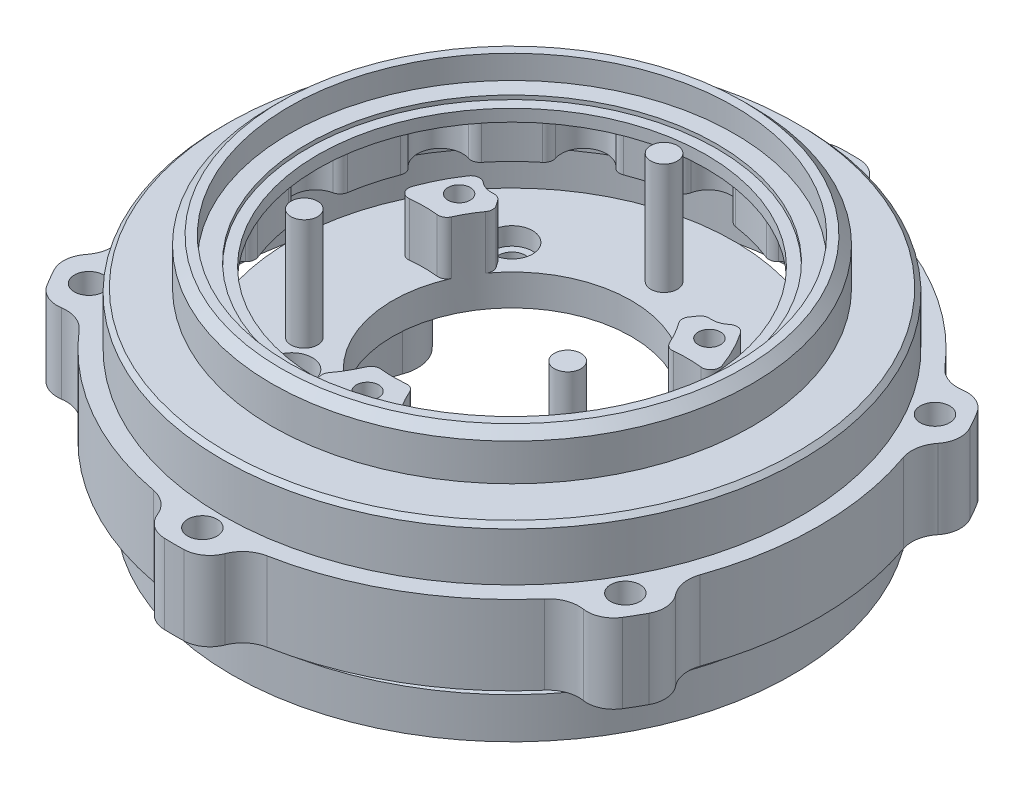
SolidWorks part; units mm, degrees
ref_plane "前视基准面" through (0, 0, 0) normal (0, 0, 1) x (1, 0, 0)
ref_plane "上视基准面" through (0, 0, 0) normal (0, 1, 0) x (1, 0, 0)
ref_plane "右视基准面" through (0, 0, 0) normal (1, 0, 0) x (0, 0, -1)
sketch "草图2" plane through (0, 0, 0) normal (0, 1, 0) x (1, 0, 0)
  circle A0 centre (0, 0) radius 17.5 construction
  circle A1 centre (-12.3744, 12.3744) radius 1.5
  circle A2 centre (12.3744, 12.3744) radius 1.5
  circle A3 centre (12.3744, -12.3744) radius 1.5
  circle A4 centre (-12.3744, -12.3744) radius 1.5
  circle A5 centre (0, 0) radius 13.42
  circle A6 centre (0, 0) radius 17.1 construction
  circle A7 centre (0, 17.1) radius 1.5
  circle A8 centre (14.809, -8.55) radius 1.5
  circle A9 centre (-14.809, -8.55) radius 1.5
  circle A10 centre (0, 17.1) radius 13.5 construction
  circle A11 centre (-14.809, -8.55) radius 13.5 construction
  circle A12 centre (14.809, -8.55) radius 13.5 construction
  circle A13 centre (0, 0) radius 31
  circle A14 centre (0, 17.1) radius 12.6 construction
  circle A15 centre (14.809, -8.55) radius 12.6 construction
  circle A16 centre (-14.809, -8.55) radius 12.6 construction
  circle A17 centre (0, 0) radius 25
  circle A18 centre (0, 0) radius 18.5 construction
  circle A19 centre (0, 0) radius 16.25 construction
  circle A20 centre (-14.0729, 8.125) radius 1.25
  circle A21 centre (14.0729, 8.125) radius 1.25
  circle A22 centre (0, -16.25) radius 1.25
  circle A23 centre (-12.3744, 12.3744) radius 2.3
  circle A24 centre (12.3744, 12.3744) radius 2.3
  circle A25 centre (12.3744, -12.3744) radius 2.3
  circle A26 centre (-12.3744, -12.3744) radius 2.3
  point P14 (0, 0)
  point P22 (0, 0)
  point P33 (0, 0)
  point P42 (0, 0)
  point P50 (0, 0)
  dimension "D1" = 35
  dimension "D2" = 3
  dimension "D4" = 26.84
  dimension "D5" = 34.2
  dimension "D6" = 3
  dimension "D8" = 27
  dimension "D9" = 62
  dimension "D10" = 25.2
  dimension "D12" = 50
  dimension "D13" = 37
  dimension "D14" = 32.5
  dimension "D15" = 2.5
  dimension "D17" = 4.6
  dimension "D3" = 4
  dimension "D7" = 3
  dimension "D11" = 3
  dimension "D16" = 3
  dimension "D18" = 4
sketch "草图3" plane through (0, 0, 0) normal (0, 1, 0) x (1, 0, 0)
  circle A0 centre (0, 0) radius 24.98
  circle A1 centre (0, 0) radius 13.42 construction
  circle A2 centre (0, 0) radius 13.42
  circle A3 centre (0, -16.25) radius 1.25 construction
  circle A4 centre (14.0729, 8.125) radius 1.25 construction
  circle A5 centre (-14.0729, 8.125) radius 1.25 construction
  circle A6 centre (12.3744, -12.3744) radius 1.5 construction
  circle A7 centre (-12.3744, -12.3744) radius 1.5 construction
  circle A8 centre (-12.3744, 12.3744) radius 1.5 construction
  circle A9 centre (12.3744, 12.3744) radius 1.5 construction
  circle A10 centre (14.809, -8.55) radius 1.5 construction
  circle A11 centre (-14.809, -8.55) radius 1.5 construction
  circle A12 centre (0, 17.1) radius 1.5 construction
  circle A13 centre (0, -16.25) radius 1.25
  circle A14 centre (14.0729, 8.125) radius 1.25
  circle A15 centre (-14.0729, 8.125) radius 1.25
  circle A16 centre (12.3744, -12.3744) radius 1.5
  circle A17 centre (-12.3744, -12.3744) radius 1.5
  circle A18 centre (-12.3744, 12.3744) radius 1.5
  circle A19 centre (12.3744, 12.3744) radius 1.5
  circle A20 centre (14.809, -8.55) radius 1.5
  circle A21 centre (-14.809, -8.55) radius 1.5
  circle A22 centre (0, 17.1) radius 1.5
  dimension "D1" = 49.96
extrude "凸台-拉伸1" add sketch "草图3" along normal blind 6.9
sketch "草图4" plane through (0, 6.9, 0) normal (0, 1, 0) x (1, 0, 0)
  circle A0 centre (0, 0) radius 26
  circle A1 centre (0, 0) radius 25 construction
  circle A2 centre (0, 0) radius 24.98 construction
  circle A3 centre (0, 0) radius 24.98
  dimension "D1" = 1
sketch "草图5" plane through (0, 0, 0) normal (0, -1, 0) x (1, 0, 0)
  circle A0 centre (0, 0) radius 21.05
  dimension "D1" = 42.1
extrude "切除-拉伸1" cut sketch "草图5" against normal blind 3.4
sketch "草图6" plane through (0, 0, 0) normal (0, -1, 0) x (1, 0, 0)
  line L0 (0, 0) -> (0, -17.1) construction
  line L1 (0, 0) -> (-21.9203, -21.9203) construction
  line L2 (0, 0) -> (21.9203, -21.9203) construction
  line L3 (-14.8846, -14.8846) -> (-21.9203, -21.9203)
  line L4 (14.8846, -14.8846) -> (21.9203, -21.9203)
  line L5 (-25.4067, -10.5238) -> (25.4067, -10.5238) construction
  line L6 (-14.8846, -14.8846) -> (14.8846, -14.8846) construction
  circle A0 centre (-10.5238, 25.4067) radius 3.5 construction
  arc A2 (21.9203, -21.9203) -> (-21.9203, -21.9203) centre (0, 0) ccw
  arc A3 (14.8846, -14.8846) -> (-14.8846, -14.8846) centre (0, 0) ccw
  circle A4 centre (0, 0) radius 27.5 construction
  circle A5 centre (-25.4067, -10.5238) radius 1.65
  circle A6 centre (-25.4067, 10.5238) radius 1.65
  circle A7 centre (-10.5238, 25.4067) radius 1.65
  circle A8 centre (10.5238, 25.4067) radius 1.65
  circle A9 centre (25.4067, 10.5238) radius 1.65
  circle A10 centre (25.4067, -10.5238) radius 1.65
  circle A11 centre (10.5238, -25.4067) radius 1.65 construction
  circle A12 centre (-10.5238, -25.4067) radius 1.65 construction
  point P28 (0, 0)
  dimension "D4" = 42.1
  dimension "D5" = 55
  dimension "D6" = 3.3
  dimension "D8" = 7
  dimension "D1" = 45
  dimension "D2" = 90
  dimension "D7" = 8
extrude "凸台-拉伸3" add sketch "草图6" along normal blind 8 separate body
sketch "草图7" plane through (0, 0, 0) normal (0, 1, 0) x (1, 0, 0)
  circle A0 centre (0, 0) radius 26.98
  circle A1 centre (0, 0) radius 24.98 construction
  circle A2 centre (0, 0) radius 31
  dimension "D1" = 2
extrude "切除-拉伸3" cut sketch "草图7" against normal blind 1
sketch "草图10" plane through (0, 6.9, 0) normal (0, 1, 0) x (1, 0, 0)
  circle A0 centre (-12.3744, 12.3744) radius 2.3
  circle A1 centre (12.3744, 12.3744) radius 2.3
  circle A2 centre (12.3744, -12.3744) radius 2.3
  circle A3 centre (-12.3744, -12.3744) radius 2.3
  point P12 (0, 0)
  dimension "D1" = 4.6
  dimension "D2" = 4
extrude "切除-拉伸4" cut sketch "草图10" against normal blind 2
sketch "草图11" plane through (0, 6.9, 0) normal (0, 1, 0) x (1, 0, 0)
  circle A0 centre (0, 0) radius 13.42 construction
  circle A1 centre (14.809, -8.55) radius 13.5 construction
  circle A2 centre (-14.809, -8.55) radius 13.5 construction
  circle A3 centre (0, 17.1) radius 13.5 construction
  circle A4 centre (0, 0) radius 18.5 construction
  arc A5 (-10.3955, 8.487) -> (-12.5477, 4.7593) centre (0, 0) ccw
  arc A6 (17.9226, 4.5861) -> (12.5477, 4.7593) centre (14.809, -8.55) ccw
  arc A7 (-12.5477, 4.7593) -> (-17.9226, 4.5861) centre (-14.809, -8.55) ccw
  arc A8 (-11.6071, 10.2061) -> (-10.3955, 8.487) centre (0, 17.1) ccw
  arc A9 (-14.4982, 11.4915) -> (-17.9226, 4.5861) centre (0, 0) ccw
  circle A10 centre (12.3744, 12.3744) radius 2.3 construction
  circle A11 centre (-12.3744, 12.3744) radius 2.3 construction
  arc A12 (11.6071, 10.2061) -> (14.4982, 11.4915) centre (12.3744, 12.3744) ccw
  arc A13 (-14.4982, 11.4915) -> (-11.6071, 10.2061) centre (-12.3744, 12.3744) ccw
  arc A14 (10.3955, 8.487) -> (11.6071, 10.2061) centre (0, 17.1) ccw
  arc A15 (17.9226, 4.5861) -> (14.4982, 11.4915) centre (0, 0) ccw
  arc A16 (12.5477, 4.7593) -> (10.3955, 8.487) centre (0, 0) ccw
  arc A17 (2.1522, -13.2463) -> (4.9896, -17.8144) centre (14.809, -8.55) ccw
  arc A18 (-2.1522, -13.2463) -> (2.1522, -13.2463) centre (0, 0) ccw
  arc A19 (-4.9896, -17.8144) -> (4.9896, -17.8144) centre (0, 0) ccw
  arc A20 (-4.9896, -17.8144) -> (-2.1522, -13.2463) centre (-14.809, -8.55) ccw
  circle A21 centre (0, -16.25) radius 1.25 construction
  circle A22 centre (14.0729, 8.125) radius 1.25 construction
  circle A23 centre (-14.0729, 8.125) radius 1.25 construction
  circle A24 centre (0, -16.25) radius 1.25
  circle A25 centre (14.0729, 8.125) radius 1.25
  circle A26 centre (-14.0729, 8.125) radius 1.25
extrude "凸台-拉伸4" add sketch "草图11" along normal blind 6
fillet "圆角2" radius 1 14 edges at (-14.4982, 9.9, -11.4915) (-11.6071, 9.9, -10.2061) (-12.5477, 9.9, -4.7593) (-17.9226, 9.9, -4.5861) (-10.3955, 9.9, -8.487) (11.6071, 9.9, -10.2061) (14.4982, 9.9, -11.4915) (12.5477, 9.9, -4.7593) (10.3955, 9.9, -8.487) (17.9226, 9.9, -4.5861) (2.1522, 9.9, 13.2463) (-4.9896, 9.9, 17.8144) (-2.1522, 9.9, 13.2463) (4.9896, 9.9, 17.8144)
sketch "草图12" plane through (0, 6.9, 0) normal (0, 1, 0) x (1, 0, 0)
  line L0 (-19.9186, 11.5) -> (0, 0) construction
  line L1 (0, 0) -> (19.9186, 11.5) construction
  circle A0 centre (0, 17.1) radius 12.6 construction
  circle A1 centre (-14.809, -8.55) radius 12.6 construction
  circle A2 centre (14.809, -8.55) radius 12.6 construction
  circle A3 centre (0, 17.1) radius 12.6 construction
  circle A4 centre (-14.809, -8.55) radius 13.5 construction
  circle A5 centre (0, 0) radius 25 construction
  circle A6 centre (0, 0) radius 23 construction
  circle A7 centre (-19.9186, 11.5) radius 1.25
  circle A8 centre (-19.9186, 11.5) radius 2.9 construction
  circle A9 centre (-19.9186, 11.5) radius 2 construction
  circle A10 centre (-19.9186, 11.5) radius 2.5 construction
  circle A11 centre (19.9186, 11.5) radius 2 construction
  circle A12 centre (19.9186, 11.5) radius 2.9 construction
  circle A13 centre (19.9186, 11.5) radius 1.25
  circle A14 centre (0, 17.1) radius 13.5 construction
  circle A15 centre (14.809, -8.55) radius 13.5 construction
  circle A16 centre (22.1757, 6.1024) radius 2.9 construction
  circle A17 centre (-5.803, -22.2559) radius 2.9 construction
  circle A18 centre (0, -23) radius 2.9 construction
  circle A19 centre (22.1757, 6.1024) radius 1.25
  circle A20 centre (0, -23) radius 1.25
  circle A21 centre (-5.803, -22.2559) radius 1.25
  dimension "D1" = 50
  dimension "D2" = 2.5
  dimension "D3" = 5.8
  dimension "D4" = 4
  dimension "D5" = 5
  dimension "D6" = 5.8
  dimension "D7" = 2.5
  dimension "D8" = 5.8
  dimension "D9" = 5.8
  dimension "D10" = 2.5
  dimension "D11" = 120
extrude "切除-拉伸5" cut sketch "草图12" against normal up to surface (6.9 mm away)
sketch "草图13" plane through (0, 0, 0) normal (0, 1, 0) x (1, 0, 0)
  circle A0 centre (-19.9186, 11.5) radius 1.25
  circle A1 centre (-5.803, -22.2559) radius 1.25
  circle A2 centre (0, -23) radius 1.25
  circle A3 centre (22.1757, 6.1024) radius 1.25
  circle A4 centre (19.9186, 11.5) radius 1.25
  dimension "D1" = 2.5
extrude "切除-拉伸6" cut sketch "草图13" against normal blind 29.1
sketch "草图15" plane through (0, -8, 0) normal (0, -1, 0) x (1, 0, 0)
  line L0 (0, 0) -> (-28.3447, -12.553)
  line L1 (0, 0) -> (24.2605, -19.2984)
  circle A0 centre (-22.1757, -6.1024) radius 3.4 construction
  circle A1 centre (19.9186, -11.5) radius 3.4 construction
  arc A2 (21.9203, -21.9203) -> (-21.9203, -21.9203) centre (0, 0) ccw construction
  arc A3 (-28.3447, -12.553) -> (24.2605, -19.2984) centre (0, 0) ccw
  dimension "D1" = 6.8
  dimension "D2" = 6.8
  dimension "D3" = 117.612
extrude "切除-拉伸7" cut sketch "草图15" against normal up to surface (8 mm away)
fillet "圆角3" radius 2.5 4 edges at (24.2605, -4.5, -19.2984) (16.4737, -4, -13.1042) (-19.247, -4, -8.5239) (-28.3447, -4.5, -12.553)
fillet "圆角4" radius 1 1 edges at (21.1145, -0.5, -16.7958)
sketch "草图16" plane through (0, 3.4, 0) normal (0, -1, 0) x (1, 0, 0)
  circle A0 centre (0, -17.1) radius 1.5 construction
  circle A1 centre (-14.809, 8.55) radius 1.5 construction
  circle A2 centre (14.809, 8.55) radius 1.5 construction
  circle A3 centre (0, -17.1) radius 1.5
  circle A4 centre (-14.809, 8.55) radius 1.5
  circle A5 centre (14.809, 8.55) radius 1.5
extrude "凸台-拉伸5" add sketch "草图16" against normal blind 16 separate body
sketch "草图17" plane through (0, -0.1, 0) normal (0, -1, 0) x (1, 0, 0)
  circle A0 centre (0, 0) radius 31
  circle A1 centre (0, 0) radius 32.5 construction
  circle A2 centre (0, 0) radius 40.5
  circle A3 centre (0, 0) radius 36.5 construction
  circle A4 centre (0, 36.5) radius 1.65
  circle A5 centre (0, 0) radius 40.5
  circle A6 centre (31.6099, 18.25) radius 1.65
  circle A7 centre (0, 0) radius 40.5
  circle A8 centre (31.6099, -18.25) radius 1.65
  circle A9 centre (0, 0) radius 40.5
  circle A10 centre (0, -36.5) radius 1.65
  circle A11 centre (0, 0) radius 40.5
  circle A12 centre (-31.6099, -18.25) radius 1.65
  circle A13 centre (0, 0) radius 40.5
  circle A14 centre (-31.6099, 18.25) radius 1.65
  circle A15 centre (0, 36.5) radius 4 construction
  point P26 (0, 0)
  dimension "D1" = 1.5
  dimension "D3" = 8
  dimension "D4" = 3.3
  dimension "D5" = 6
extrude "凸台-拉伸6" add sketch "草图17" along normal blind 2 separate body contours A2 A14 A12 A10 A8 A6 A4 M3 | A0 M3
sketch "草图18" plane through (0, -0.1, 0) normal (0, 1, 0) x (1, 0, 0)
  circle A0 centre (0, 0) radius 32.52
  circle A1 centre (0, 0) radius 40.5 construction
  circle A2 centre (0, 0) radius 40.5
  circle A3 centre (31.6099, 18.25) radius 1.65 construction
  circle A4 centre (31.6099, -18.25) radius 1.65 construction
  circle A5 centre (0, -36.5) radius 1.65 construction
  circle A6 centre (-31.6099, -18.25) radius 1.65 construction
  circle A7 centre (-31.6099, 18.25) radius 1.65 construction
  circle A8 centre (0, 36.5) radius 1.65 construction
  circle A9 centre (31.6099, 18.25) radius 1.65
  circle A10 centre (31.6099, -18.25) radius 1.65
  circle A11 centre (0, -36.5) radius 1.65
  circle A12 centre (-31.6099, -18.25) radius 1.65
  circle A13 centre (-31.6099, 18.25) radius 1.65
  circle A14 centre (0, 36.5) radius 1.65
  dimension "D1" = 65.04
extrude "凸台-拉伸7" add sketch "草图18" along normal blind 6
sketch "草图19" plane through (0, 5.9, 0) normal (0, 1, 0) x (1, 0, 0)
  line L0 (-20.25, 35.074) -> (0, 0) construction
  line L1 (0, 0) -> (-11.5026, 38.8322) construction
  line L2 (-31.6099, 18.25) -> (0, 36.5) construction
  circle A0 centre (0, 0) radius 40.5 construction
  arc A1 (-27.8784, 29.3777) -> (-11.5026, 38.8322) centre (0, 0) cw construction
  arc A2 (-13.201, 44.5659) -> (-31.9947, 33.7154) centre (0, 0) ccw
  arc A3 (-9.8042, 33.0985) -> (-23.762, 25.0399) centre (0, 0) ccw
  arc A4 (-9.8042, 33.0985) -> (-13.201, 44.5659) centre (-11.5026, 38.8322) ccw
  arc A5 (-31.9947, 33.7154) -> (-23.762, 25.0399) centre (-27.8784, 29.3777) ccw
  circle A6 centre (0, 0) radius 32.52 construction
  circle A7 centre (0, 0) radius 40.5 construction
  arc A8 (23.762, 25.0399) -> (9.8042, 33.0985) centre (0, 0) ccw
  arc A9 (23.762, 25.0399) -> (31.9947, 33.7154) centre (27.8784, 29.3777) ccw
  arc A10 (13.201, 44.5659) -> (9.8042, 33.0985) centre (11.5026, 38.8322) ccw
  arc A11 (31.9947, 33.7154) -> (13.201, 44.5659) centre (0, 0) ccw
  arc A12 (11.5026, 38.8322) -> (27.8784, 29.3777) centre (0, 0) cw construction
  arc A13 (33.5662, -8.0585) -> (33.5662, 8.0585) centre (0, 0) ccw
  arc A14 (33.5662, -8.0585) -> (45.1958, -10.8505) centre (39.381, -9.4545) ccw
  arc A15 (45.1958, 10.8505) -> (33.5662, 8.0585) centre (39.381, 9.4545) ccw
  arc A16 (45.1958, -10.8505) -> (45.1958, 10.8505) centre (0, 0) ccw
  arc A17 (39.381, 9.4545) -> (39.381, -9.4545) centre (0, 0) cw construction
  arc A18 (9.8042, -33.0985) -> (23.762, -25.0399) centre (0, 0) ccw
  arc A19 (9.8042, -33.0985) -> (13.201, -44.5659) centre (11.5026, -38.8322) ccw
  arc A20 (31.9947, -33.7154) -> (23.762, -25.0399) centre (27.8784, -29.3777) ccw
  arc A21 (13.201, -44.5659) -> (31.9947, -33.7154) centre (0, 0) ccw
  arc A22 (27.8784, -29.3777) -> (11.5026, -38.8322) centre (0, 0) cw construction
  arc A23 (-23.762, -25.0399) -> (-9.8042, -33.0985) centre (0, 0) ccw
  arc A24 (-23.762, -25.0399) -> (-31.9947, -33.7154) centre (-27.8784, -29.3777) ccw
  arc A25 (-13.201, -44.5659) -> (-9.8042, -33.0985) centre (-11.5026, -38.8322) ccw
  arc A26 (-31.9947, -33.7154) -> (-13.201, -44.5659) centre (0, 0) ccw
  arc A27 (-11.5026, -38.8322) -> (-27.8784, -29.3777) centre (0, 0) cw construction
  arc A28 (-33.5662, 8.0585) -> (-33.5662, -8.0585) centre (0, 0) ccw
  arc A29 (-33.5662, 8.0585) -> (-45.1958, 10.8505) centre (-39.381, 9.4545) ccw
  arc A30 (-45.1958, -10.8505) -> (-33.5662, -8.0585) centre (-39.381, -9.4545) ccw
  arc A31 (-45.1958, 10.8505) -> (-45.1958, -10.8505) centre (0, 0) ccw
  arc A32 (-39.381, -9.4545) -> (-39.381, 9.4545) centre (0, 0) cw construction
  point P5 (-20.25, 35.074)
  point P26 (20.25, 35.074)
  point P33 (40.5, 0)
  point P40 (20.25, -35.074)
  point P47 (-20.25, -35.074)
  point P54 (-40.5, 0)
  point P59 (0, 0)
  dimension "D1" = 13.5
  dimension "D2" = 2
  dimension "D3" = 6
extrude "切除-拉伸8" cut sketch "草图19" against normal up to surface (8 mm away)
sketch "草图20" plane through (0, 5.9, 0) normal (0, 1, 0) x (1, 0, 0)
  circle A0 centre (0, 0) radius 40
  circle A2 centre (0, 36.5) radius 3.5 construction
  circle A3 centre (0, 0) radius 40.5
  dimension "D1" = 7
extrude "切除-拉伸9" cut sketch "草图20" against normal blind 26
fillet "圆角6" radius 4 12 edges at (5.5734, 1.9, -39.6098) (-31.5164, 1.9, -24.6316) (-37.0898, 1.9, -14.9782) (-37.0898, 1.9, 14.9782) (-31.5164, 1.9, 24.6316) (-5.5734, 1.9, 39.6098) (5.5734, 1.9, 39.6098) (31.5164, 1.9, 24.6316) (37.0898, 1.9, 14.9782) (37.0898, 1.9, -14.9782) (31.5164, 1.9, -24.6316) (-5.5734, 1.9, -39.6098)
chamfer "倒角3" distance 1 angle 45 2 edges at (0, -2.1, -31) (0, -0.1, -31)
ref_plane "基准面1" through (0, 6, 0) normal (0, 1, 0) x (1, 0, 0)
sketch "草图21" plane through (0, 6, 0) normal (0, 1, 0) x (1, 0, 0)
  circle A0 centre (0, 0) radius 32.52
  circle A1 centre (0, 36.5) radius 2
  circle A2 centre (31.6099, 18.25) radius 2
  circle A3 centre (31.6099, -18.25) radius 2
  circle A4 centre (0, -36.5) radius 2
  circle A5 centre (-31.6099, -18.25) radius 2
  circle A6 centre (-31.6099, 18.25) radius 2
  arc A36 (5.7779, 37.1035) -> (9.8042, 33.0985) centre (11.5026, 38.8322) ccw
  arc A37 (5.7779, 37.1035) -> (2.1652, 39.9414) centre (1.9487, 35.9472) ccw
  arc A38 (2.1652, 39.9414) -> (-2.1652, 39.9414) centre (0, 0) ccw
  arc A39 (-2.1652, 39.9414) -> (-5.7779, 37.1035) centre (-1.9487, 35.9472) ccw
  arc A40 (-9.8042, 33.0985) -> (-5.7779, 37.1035) centre (-11.5026, 38.8322) ccw
  arc A41 (-9.8042, 33.0985) -> (-23.762, 25.0399) centre (0, 0) ccw
  arc A42 (-29.2436, 23.5556) -> (-23.762, 25.0399) centre (-27.8784, 29.3777) ccw
  arc A43 (-29.2436, 23.5556) -> (-33.5076, 21.8458) centre (-30.1569, 19.6612) ccw
  arc A44 (-33.5076, 21.8458) -> (-35.6728, 18.0955) centre (0, 0) ccw
  arc A45 (-35.6728, 18.0955) -> (-35.0216, 13.5479) centre (-32.1056, 16.286) ccw
  arc A46 (-33.5662, 8.0585) -> (-35.0216, 13.5479) centre (-39.381, 9.4545) ccw
  arc A47 (-33.5662, 8.0585) -> (-33.5662, -8.0585) centre (0, 0) ccw
  arc A48 (-35.0216, -13.5479) -> (-33.5662, -8.0585) centre (-39.381, -9.4545) ccw
  arc A49 (-35.0216, -13.5479) -> (-35.6728, -18.0955) centre (-32.1056, -16.286) ccw
  arc A50 (-35.6728, -18.0955) -> (-33.5076, -21.8458) centre (0, 0) ccw
  arc A51 (-33.5076, -21.8458) -> (-29.2436, -23.5556) centre (-30.1569, -19.6612) ccw
  arc A52 (-23.762, -25.0399) -> (-29.2436, -23.5556) centre (-27.8784, -29.3777) ccw
  arc A53 (-23.762, -25.0399) -> (-9.8042, -33.0985) centre (0, 0) ccw
  arc A54 (-5.7779, -37.1035) -> (-9.8042, -33.0985) centre (-11.5026, -38.8322) ccw
  arc A55 (-5.7779, -37.1035) -> (-2.1652, -39.9414) centre (-1.9487, -35.9472) ccw
  arc A56 (-2.1652, -39.9414) -> (2.1652, -39.9414) centre (0, 0) ccw
  arc A57 (2.1652, -39.9414) -> (5.7779, -37.1035) centre (1.9487, -35.9472) ccw
  arc A58 (9.8042, -33.0985) -> (5.7779, -37.1035) centre (11.5026, -38.8322) ccw
  arc A59 (9.8042, -33.0985) -> (23.762, -25.0399) centre (0, 0) ccw
  arc A60 (29.2436, -23.5556) -> (23.762, -25.0399) centre (27.8784, -29.3777) ccw
  arc A61 (29.2436, -23.5556) -> (33.5076, -21.8458) centre (30.1569, -19.6612) ccw
  arc A62 (33.5076, -21.8458) -> (35.6728, -18.0955) centre (0, 0) ccw
  arc A63 (35.6728, -18.0955) -> (35.0216, -13.5479) centre (32.1056, -16.286) ccw
  arc A64 (33.5662, -8.0585) -> (35.0216, -13.5479) centre (39.381, -9.4545) ccw
  arc A65 (33.5662, -8.0585) -> (33.5662, 8.0585) centre (0, 0) ccw
  arc A66 (35.0216, 13.5479) -> (33.5662, 8.0585) centre (39.381, 9.4545) ccw
  arc A67 (35.0216, 13.5479) -> (35.6728, 18.0955) centre (32.1056, 16.286) ccw
  arc A68 (35.6728, 18.0955) -> (33.5076, 21.8458) centre (0, 0) ccw
  arc A69 (33.5076, 21.8458) -> (29.2436, 23.5556) centre (30.1569, 19.6612) ccw
  arc A70 (23.762, 25.0399) -> (29.2436, 23.5556) centre (27.8784, 29.3777) ccw
  arc A71 (23.762, 25.0399) -> (9.8042, 33.0985) centre (0, 0) ccw
  arc A72 (5.7779, 37.1035) -> (9.8042, 33.0985) centre (11.5026, 38.8322) ccw
  arc A73 (5.7779, 37.1035) -> (2.1652, 39.9414) centre (1.9487, 35.9472) ccw
  arc A74 (2.1652, 39.9414) -> (-2.1652, 39.9414) centre (0, 0) ccw
  arc A75 (-2.1652, 39.9414) -> (-5.7779, 37.1035) centre (-1.9487, 35.9472) ccw
  arc A76 (-9.8042, 33.0985) -> (-5.7779, 37.1035) centre (-11.5026, 38.8322) ccw
  arc A77 (-9.8042, 33.0985) -> (-23.762, 25.0399) centre (0, 0) ccw
  arc A78 (-29.2436, 23.5556) -> (-23.762, 25.0399) centre (-27.8784, 29.3777) ccw
  arc A79 (-29.2436, 23.5556) -> (-33.5076, 21.8458) centre (-30.1569, 19.6612) ccw
  arc A80 (-33.5076, 21.8458) -> (-35.6728, 18.0955) centre (0, 0) ccw
  arc A81 (-35.6728, 18.0955) -> (-35.0216, 13.5479) centre (-32.1056, 16.286) ccw
  arc A82 (-33.5662, 8.0585) -> (-35.0216, 13.5479) centre (-39.381, 9.4545) ccw
  arc A83 (-33.5662, 8.0585) -> (-33.5662, -8.0585) centre (0, 0) ccw
  arc A84 (-35.0216, -13.5479) -> (-33.5662, -8.0585) centre (-39.381, -9.4545) ccw
  arc A85 (-35.0216, -13.5479) -> (-35.6728, -18.0955) centre (-32.1056, -16.286) ccw
  arc A86 (-35.6728, -18.0955) -> (-33.5076, -21.8458) centre (0, 0) ccw
  arc A87 (-33.5076, -21.8458) -> (-29.2436, -23.5556) centre (-30.1569, -19.6612) ccw
  arc A88 (-23.762, -25.0399) -> (-29.2436, -23.5556) centre (-27.8784, -29.3777) ccw
  arc A89 (-23.762, -25.0399) -> (-9.8042, -33.0985) centre (0, 0) ccw
  arc A90 (-5.7779, -37.1035) -> (-9.8042, -33.0985) centre (-11.5026, -38.8322) ccw
  arc A91 (-5.7779, -37.1035) -> (-2.1652, -39.9414) centre (-1.9487, -35.9472) ccw
  arc A92 (-2.1652, -39.9414) -> (2.1652, -39.9414) centre (0, 0) ccw
  arc A93 (2.1652, -39.9414) -> (5.7779, -37.1035) centre (1.9487, -35.9472) ccw
  arc A94 (9.8042, -33.0985) -> (5.7779, -37.1035) centre (11.5026, -38.8322) ccw
  arc A95 (9.8042, -33.0985) -> (23.762, -25.0399) centre (0, 0) ccw
  arc A96 (29.2436, -23.5556) -> (23.762, -25.0399) centre (27.8784, -29.3777) ccw
  arc A97 (29.2436, -23.5556) -> (33.5076, -21.8458) centre (30.1569, -19.6612) ccw
  arc A98 (33.5076, -21.8458) -> (35.6728, -18.0955) centre (0, 0) ccw
  arc A99 (35.6728, -18.0955) -> (35.0216, -13.5479) centre (32.1056, -16.286) ccw
  arc A100 (33.5662, -8.0585) -> (35.0216, -13.5479) centre (39.381, -9.4545) ccw
  arc A101 (33.5662, -8.0585) -> (33.5662, 8.0585) centre (0, 0) ccw
  arc A102 (35.0216, 13.5479) -> (33.5662, 8.0585) centre (39.381, 9.4545) ccw
  arc A103 (35.0216, 13.5479) -> (35.6728, 18.0955) centre (32.1056, 16.286) ccw
  arc A104 (35.6728, 18.0955) -> (33.5076, 21.8458) centre (0, 0) ccw
  arc A105 (33.5076, 21.8458) -> (29.2436, 23.5556) centre (30.1569, 19.6612) ccw
  arc A106 (23.762, 25.0399) -> (29.2436, 23.5556) centre (27.8784, 29.3777) ccw
  arc A107 (23.762, 25.0399) -> (9.8042, 33.0985) centre (0, 0) ccw
  point P45 (0, 0)
  dimension "D2" = 65.04
  dimension "D3" = 4
  dimension "D1" = 0
  dimension "D4" = 6
extrude "凸台-拉伸8" add sketch "草图21" along normal blind 0.9 separate body
sketch "草图22" plane through (0, 6.9, 0) normal (0, 1, 0) x (1, 0, 0)
  circle A0 centre (0, 0) radius 30.52
  circle A1 centre (0, 0) radius 32.52 construction
  circle A2 centre (31.6099, 18.25) radius 2 construction
  circle A3 centre (31.6099, -18.25) radius 2 construction
  circle A4 centre (0, -36.5) radius 2 construction
  circle A5 centre (-31.6099, -18.25) radius 2 construction
  circle A6 centre (-31.6099, 18.25) radius 2 construction
  circle A7 centre (0, 36.5) radius 2 construction
  circle A8 centre (31.6099, 18.25) radius 2
  circle A9 centre (31.6099, -18.25) radius 2
  circle A10 centre (0, -36.5) radius 2
  circle A11 centre (-31.6099, -18.25) radius 2
  circle A12 centre (-31.6099, 18.25) radius 2
  circle A13 centre (0, 36.5) radius 2
  arc A36 (5.7779, 37.1035) -> (2.1652, 39.9414) centre (1.9487, 35.9472) ccw
  arc A37 (2.1652, 39.9414) -> (-2.1652, 39.9414) centre (0, 0) ccw
  arc A38 (-2.1652, 39.9414) -> (-5.7779, 37.1035) centre (-1.9487, 35.9472) ccw
  arc A39 (-9.8042, 33.0985) -> (-5.7779, 37.1035) centre (-11.5026, 38.8322) ccw
  arc A40 (-9.8042, 33.0985) -> (-23.762, 25.0399) centre (0, 0) ccw
  arc A41 (-29.2436, 23.5556) -> (-23.762, 25.0399) centre (-27.8784, 29.3777) ccw
  arc A42 (-29.2436, 23.5556) -> (-33.5076, 21.8458) centre (-30.1569, 19.6612) ccw
  arc A43 (-33.5076, 21.8458) -> (-35.6728, 18.0955) centre (0, 0) ccw
  arc A44 (-35.6728, 18.0955) -> (-35.0216, 13.5479) centre (-32.1056, 16.286) ccw
  arc A45 (-33.5662, 8.0585) -> (-35.0216, 13.5479) centre (-39.381, 9.4545) ccw
  arc A46 (-33.5662, 8.0585) -> (-33.5662, -8.0585) centre (0, 0) ccw
  arc A47 (-35.0216, -13.5479) -> (-33.5662, -8.0585) centre (-39.381, -9.4545) ccw
  arc A48 (-35.0216, -13.5479) -> (-35.6728, -18.0955) centre (-32.1056, -16.286) ccw
  arc A49 (-35.6728, -18.0955) -> (-33.5076, -21.8458) centre (0, 0) ccw
  arc A50 (-33.5076, -21.8458) -> (-29.2436, -23.5556) centre (-30.1569, -19.6612) ccw
  arc A51 (-23.762, -25.0399) -> (-29.2436, -23.5556) centre (-27.8784, -29.3777) ccw
  arc A52 (-23.762, -25.0399) -> (-9.8042, -33.0985) centre (0, 0) ccw
  arc A53 (-5.7779, -37.1035) -> (-9.8042, -33.0985) centre (-11.5026, -38.8322) ccw
  arc A54 (-5.7779, -37.1035) -> (-2.1652, -39.9414) centre (-1.9487, -35.9472) ccw
  arc A55 (-2.1652, -39.9414) -> (2.1652, -39.9414) centre (0, 0) ccw
  arc A56 (2.1652, -39.9414) -> (5.7779, -37.1035) centre (1.9487, -35.9472) ccw
  arc A57 (9.8042, -33.0985) -> (5.7779, -37.1035) centre (11.5026, -38.8322) ccw
  arc A58 (9.8042, -33.0985) -> (23.762, -25.0399) centre (0, 0) ccw
  arc A59 (29.2436, -23.5556) -> (23.762, -25.0399) centre (27.8784, -29.3777) ccw
  arc A60 (29.2436, -23.5556) -> (33.5076, -21.8458) centre (30.1569, -19.6612) ccw
  arc A61 (33.5076, -21.8458) -> (35.6728, -18.0955) centre (0, 0) ccw
  arc A62 (35.6728, -18.0955) -> (35.0216, -13.5479) centre (32.1056, -16.286) ccw
  arc A63 (33.5662, -8.0585) -> (35.0216, -13.5479) centre (39.381, -9.4545) ccw
  arc A64 (33.5662, -8.0585) -> (33.5662, 8.0585) centre (0, 0) ccw
  arc A65 (35.0216, 13.5479) -> (33.5662, 8.0585) centre (39.381, 9.4545) ccw
  arc A66 (35.0216, 13.5479) -> (35.6728, 18.0955) centre (32.1056, 16.286) ccw
  arc A67 (35.6728, 18.0955) -> (33.5076, 21.8458) centre (0, 0) ccw
  arc A68 (33.5076, 21.8458) -> (29.2436, 23.5556) centre (30.1569, 19.6612) ccw
  arc A69 (23.762, 25.0399) -> (29.2436, 23.5556) centre (27.8784, 29.3777) ccw
  arc A70 (23.762, 25.0399) -> (9.8042, 33.0985) centre (0, 0) ccw
  arc A71 (5.7779, 37.1035) -> (9.8042, 33.0985) centre (11.5026, 38.8322) ccw
  arc A72 (5.7779, 37.1035) -> (2.1652, 39.9414) centre (1.9487, 35.9472) ccw
  arc A73 (2.1652, 39.9414) -> (-2.1652, 39.9414) centre (0, 0) ccw
  arc A74 (-2.1652, 39.9414) -> (-5.7779, 37.1035) centre (-1.9487, 35.9472) ccw
  arc A75 (-9.8042, 33.0985) -> (-5.7779, 37.1035) centre (-11.5026, 38.8322) ccw
  arc A76 (-9.8042, 33.0985) -> (-23.762, 25.0399) centre (0, 0) ccw
  arc A77 (-29.2436, 23.5556) -> (-23.762, 25.0399) centre (-27.8784, 29.3777) ccw
  arc A78 (-29.2436, 23.5556) -> (-33.5076, 21.8458) centre (-30.1569, 19.6612) ccw
  arc A79 (-33.5076, 21.8458) -> (-35.6728, 18.0955) centre (0, 0) ccw
  arc A80 (-35.6728, 18.0955) -> (-35.0216, 13.5479) centre (-32.1056, 16.286) ccw
  arc A81 (-33.5662, 8.0585) -> (-35.0216, 13.5479) centre (-39.381, 9.4545) ccw
  arc A82 (-33.5662, 8.0585) -> (-33.5662, -8.0585) centre (0, 0) ccw
  arc A83 (-35.0216, -13.5479) -> (-33.5662, -8.0585) centre (-39.381, -9.4545) ccw
  arc A84 (-35.0216, -13.5479) -> (-35.6728, -18.0955) centre (-32.1056, -16.286) ccw
  arc A85 (-35.6728, -18.0955) -> (-33.5076, -21.8458) centre (0, 0) ccw
  arc A86 (-33.5076, -21.8458) -> (-29.2436, -23.5556) centre (-30.1569, -19.6612) ccw
  arc A87 (-23.762, -25.0399) -> (-29.2436, -23.5556) centre (-27.8784, -29.3777) ccw
  arc A88 (-23.762, -25.0399) -> (-9.8042, -33.0985) centre (0, 0) ccw
  arc A89 (-5.7779, -37.1035) -> (-9.8042, -33.0985) centre (-11.5026, -38.8322) ccw
  arc A90 (-5.7779, -37.1035) -> (-2.1652, -39.9414) centre (-1.9487, -35.9472) ccw
  arc A91 (-2.1652, -39.9414) -> (2.1652, -39.9414) centre (0, 0) ccw
  arc A92 (2.1652, -39.9414) -> (5.7779, -37.1035) centre (1.9487, -35.9472) ccw
  arc A93 (9.8042, -33.0985) -> (5.7779, -37.1035) centre (11.5026, -38.8322) ccw
  arc A94 (9.8042, -33.0985) -> (23.762, -25.0399) centre (0, 0) ccw
  arc A95 (29.2436, -23.5556) -> (23.762, -25.0399) centre (27.8784, -29.3777) ccw
  arc A96 (29.2436, -23.5556) -> (33.5076, -21.8458) centre (30.1569, -19.6612) ccw
  arc A97 (33.5076, -21.8458) -> (35.6728, -18.0955) centre (0, 0) ccw
  arc A98 (35.6728, -18.0955) -> (35.0216, -13.5479) centre (32.1056, -16.286) ccw
  arc A99 (33.5662, -8.0585) -> (35.0216, -13.5479) centre (39.381, -9.4545) ccw
  arc A100 (33.5662, -8.0585) -> (33.5662, 8.0585) centre (0, 0) ccw
  arc A101 (35.0216, 13.5479) -> (33.5662, 8.0585) centre (39.381, 9.4545) ccw
  arc A102 (35.0216, 13.5479) -> (35.6728, 18.0955) centre (32.1056, 16.286) ccw
  arc A103 (35.6728, 18.0955) -> (33.5076, 21.8458) centre (0, 0) ccw
  arc A104 (33.5076, 21.8458) -> (29.2436, 23.5556) centre (30.1569, 19.6612) ccw
  arc A105 (23.762, 25.0399) -> (29.2436, 23.5556) centre (27.8784, 29.3777) ccw
  arc A106 (23.762, 25.0399) -> (9.8042, 33.0985) centre (0, 0) ccw
  arc A107 (5.7779, 37.1035) -> (9.8042, 33.0985) centre (11.5026, 38.8322) ccw
  dimension "D2" = 2
  dimension "D1" = 0
extrude "凸台-拉伸9" add sketch "草图22" along normal blind 4.65
sketch "草图23" plane through (0, 11.55, 0) normal (0, 1, 0) x (1, 0, 0)
  circle A0 centre (0, 0) radius 22.075
  circle A1 centre (0, 22.075) radius 2.55
  circle A2 centre (11.0375, 19.1175) radius 2.55
  circle A3 centre (19.1175, 11.0375) radius 2.55
  circle A4 centre (22.075, 0) radius 2.55
  circle A5 centre (19.1175, -11.0375) radius 2.55
  circle A6 centre (11.0375, -19.1175) radius 2.55
  circle A7 centre (0, -22.075) radius 2.55
  circle A8 centre (-11.0375, -19.1175) radius 2.55
  circle A9 centre (-19.1175, -11.0375) radius 2.55
  circle A10 centre (-22.075, 0) radius 2.55
  circle A11 centre (-19.1175, 11.0375) radius 2.55
  circle A12 centre (-11.0375, 19.1175) radius 2.55
  arc A36 (5.7779, 37.1035) -> (9.8042, 33.0985) centre (11.5026, 38.8322) ccw
  arc A37 (5.7779, 37.1035) -> (2.1652, 39.9414) centre (1.9487, 35.9472) ccw
  arc A38 (2.1652, 39.9414) -> (-2.1652, 39.9414) centre (0, 0) ccw
  arc A39 (-2.1652, 39.9414) -> (-5.7779, 37.1035) centre (-1.9487, 35.9472) ccw
  arc A40 (-9.8042, 33.0985) -> (-5.7779, 37.1035) centre (-11.5026, 38.8322) ccw
  arc A41 (-9.8042, 33.0985) -> (-23.762, 25.0399) centre (0, 0) ccw
  arc A42 (-29.2436, 23.5556) -> (-23.762, 25.0399) centre (-27.8784, 29.3777) ccw
  arc A43 (-29.2436, 23.5556) -> (-33.5076, 21.8458) centre (-30.1569, 19.6612) ccw
  arc A44 (-33.5076, 21.8458) -> (-35.6728, 18.0955) centre (0, 0) ccw
  arc A45 (-35.6728, 18.0955) -> (-35.0216, 13.5479) centre (-32.1056, 16.286) ccw
  arc A46 (-33.5662, 8.0585) -> (-35.0216, 13.5479) centre (-39.381, 9.4545) ccw
  arc A47 (-33.5662, 8.0585) -> (-33.5662, -8.0585) centre (0, 0) ccw
  arc A48 (-35.0216, -13.5479) -> (-33.5662, -8.0585) centre (-39.381, -9.4545) ccw
  arc A49 (-35.0216, -13.5479) -> (-35.6728, -18.0955) centre (-32.1056, -16.286) ccw
  arc A50 (-35.6728, -18.0955) -> (-33.5076, -21.8458) centre (0, 0) ccw
  arc A51 (-33.5076, -21.8458) -> (-29.2436, -23.5556) centre (-30.1569, -19.6612) ccw
  arc A52 (-23.762, -25.0399) -> (-29.2436, -23.5556) centre (-27.8784, -29.3777) ccw
  arc A53 (-23.762, -25.0399) -> (-9.8042, -33.0985) centre (0, 0) ccw
  arc A54 (-5.7779, -37.1035) -> (-9.8042, -33.0985) centre (-11.5026, -38.8322) ccw
  arc A55 (-5.7779, -37.1035) -> (-2.1652, -39.9414) centre (-1.9487, -35.9472) ccw
  arc A56 (-2.1652, -39.9414) -> (2.1652, -39.9414) centre (0, 0) ccw
  arc A57 (2.1652, -39.9414) -> (5.7779, -37.1035) centre (1.9487, -35.9472) ccw
  arc A58 (9.8042, -33.0985) -> (5.7779, -37.1035) centre (11.5026, -38.8322) ccw
  arc A59 (9.8042, -33.0985) -> (23.762, -25.0399) centre (0, 0) ccw
  arc A60 (29.2436, -23.5556) -> (23.762, -25.0399) centre (27.8784, -29.3777) ccw
  arc A61 (29.2436, -23.5556) -> (33.5076, -21.8458) centre (30.1569, -19.6612) ccw
  arc A62 (33.5076, -21.8458) -> (35.6728, -18.0955) centre (0, 0) ccw
  arc A63 (35.6728, -18.0955) -> (35.0216, -13.5479) centre (32.1056, -16.286) ccw
  arc A64 (33.5662, -8.0585) -> (35.0216, -13.5479) centre (39.381, -9.4545) ccw
  arc A65 (33.5662, -8.0585) -> (33.5662, 8.0585) centre (0, 0) ccw
  arc A66 (35.0216, 13.5479) -> (33.5662, 8.0585) centre (39.381, 9.4545) ccw
  arc A67 (35.0216, 13.5479) -> (35.6728, 18.0955) centre (32.1056, 16.286) ccw
  arc A68 (35.6728, 18.0955) -> (33.5076, 21.8458) centre (0, 0) ccw
  arc A69 (33.5076, 21.8458) -> (29.2436, 23.5556) centre (30.1569, 19.6612) ccw
  arc A70 (23.762, 25.0399) -> (29.2436, 23.5556) centre (27.8784, 29.3777) ccw
  arc A71 (23.762, 25.0399) -> (9.8042, 33.0985) centre (0, 0) ccw
  arc A72 (5.7779, 37.1035) -> (9.8042, 33.0985) centre (11.5026, 38.8322) ccw
  arc A73 (5.7779, 37.1035) -> (2.1652, 39.9414) centre (1.9487, 35.9472) ccw
  arc A74 (2.1652, 39.9414) -> (-2.1652, 39.9414) centre (0, 0) ccw
  arc A75 (-2.1652, 39.9414) -> (-5.7779, 37.1035) centre (-1.9487, 35.9472) ccw
  arc A76 (-9.8042, 33.0985) -> (-5.7779, 37.1035) centre (-11.5026, 38.8322) ccw
  arc A77 (-9.8042, 33.0985) -> (-23.762, 25.0399) centre (0, 0) ccw
  arc A78 (-29.2436, 23.5556) -> (-23.762, 25.0399) centre (-27.8784, 29.3777) ccw
  arc A79 (-29.2436, 23.5556) -> (-33.5076, 21.8458) centre (-30.1569, 19.6612) ccw
  arc A80 (-33.5076, 21.8458) -> (-35.6728, 18.0955) centre (0, 0) ccw
  arc A81 (-35.6728, 18.0955) -> (-35.0216, 13.5479) centre (-32.1056, 16.286) ccw
  arc A82 (-33.5662, 8.0585) -> (-35.0216, 13.5479) centre (-39.381, 9.4545) ccw
  arc A83 (-33.5662, 8.0585) -> (-33.5662, -8.0585) centre (0, 0) ccw
  arc A84 (-35.0216, -13.5479) -> (-33.5662, -8.0585) centre (-39.381, -9.4545) ccw
  arc A85 (-35.0216, -13.5479) -> (-35.6728, -18.0955) centre (-32.1056, -16.286) ccw
  arc A86 (-35.6728, -18.0955) -> (-33.5076, -21.8458) centre (0, 0) ccw
  arc A87 (-33.5076, -21.8458) -> (-29.2436, -23.5556) centre (-30.1569, -19.6612) ccw
  arc A88 (-23.762, -25.0399) -> (-29.2436, -23.5556) centre (-27.8784, -29.3777) ccw
  arc A89 (-23.762, -25.0399) -> (-9.8042, -33.0985) centre (0, 0) ccw
  arc A90 (-5.7779, -37.1035) -> (-9.8042, -33.0985) centre (-11.5026, -38.8322) ccw
  arc A91 (-5.7779, -37.1035) -> (-2.1652, -39.9414) centre (-1.9487, -35.9472) ccw
  arc A92 (-2.1652, -39.9414) -> (2.1652, -39.9414) centre (0, 0) ccw
  arc A93 (2.1652, -39.9414) -> (5.7779, -37.1035) centre (1.9487, -35.9472) ccw
  arc A94 (9.8042, -33.0985) -> (5.7779, -37.1035) centre (11.5026, -38.8322) ccw
  arc A95 (9.8042, -33.0985) -> (23.762, -25.0399) centre (0, 0) ccw
  arc A96 (29.2436, -23.5556) -> (23.762, -25.0399) centre (27.8784, -29.3777) ccw
  arc A97 (29.2436, -23.5556) -> (33.5076, -21.8458) centre (30.1569, -19.6612) ccw
  arc A98 (33.5076, -21.8458) -> (35.6728, -18.0955) centre (0, 0) ccw
  arc A99 (35.6728, -18.0955) -> (35.0216, -13.5479) centre (32.1056, -16.286) ccw
  arc A100 (33.5662, -8.0585) -> (35.0216, -13.5479) centre (39.381, -9.4545) ccw
  arc A101 (33.5662, -8.0585) -> (33.5662, 8.0585) centre (0, 0) ccw
  arc A102 (35.0216, 13.5479) -> (33.5662, 8.0585) centre (39.381, 9.4545) ccw
  arc A103 (35.0216, 13.5479) -> (35.6728, 18.0955) centre (32.1056, 16.286) ccw
  arc A104 (35.6728, 18.0955) -> (33.5076, 21.8458) centre (0, 0) ccw
  arc A105 (33.5076, 21.8458) -> (29.2436, 23.5556) centre (30.1569, 19.6612) ccw
  arc A106 (23.762, 25.0399) -> (29.2436, 23.5556) centre (27.8784, 29.3777) ccw
  arc A107 (23.762, 25.0399) -> (9.8042, 33.0985) centre (0, 0) ccw
  point P81 (0, 0)
  dimension "D2" = 44.15
  dimension "D3" = 5.1
  dimension "D1" = 0
  dimension "D4" = 12
extrude "凸台-拉伸10" add sketch "草图23" along normal blind 4.65 contours A12 A0 A1 A2 A3 A4 A5 A6 A7 A8 A9 A10 A11 M77 | M76 M41 M42 M43 M44 M45 M46 M47 M48 M49 M50 M51 M52 M53 M54 M55 M56 M57 M58 M59 M60 M61 M62 M63 M64 M65 M66 M67 M68 M69 M70 M71 M72 M73 M74 M75 M39 M78 M80 M79 M77 M40 M38
fillet "圆角7" radius 1 24 edges at (-8.7592, 13.875, -20.2628) (-13.1685, 13.875, -17.7171) (-17.7171, 13.875, -13.1685) (-20.2628, 13.875, -8.7592) (-21.9277, 13.875, -2.5457) (-21.9277, 13.875, 2.5457) (-20.2628, 13.875, 8.7592) (-17.7171, 13.875, 13.1685) (-13.1685, 13.875, 17.7171) (-8.7592, 13.875, 20.2628) (-2.5457, 13.875, 21.9277) (2.5457, 13.875, 21.9277) (8.7592, 13.875, 20.2628) (13.1685, 13.875, 17.7171) (17.7171, 13.875, 13.1685) (20.2628, 13.875, 8.7592) (21.9277, 13.875, 2.5457) (21.9277, 13.875, -2.5457) (20.2628, 13.875, -8.7592) (17.7171, 13.875, -13.1685) (13.1685, 13.875, -17.7171) (8.7592, 13.875, -20.2628) (2.5457, 13.875, -21.9277) (-2.5457, 13.875, -21.9277)
sketch "草图24" plane through (0, 16.2, 0) normal (0, 1, 0) x (1, 0, 0)
  circle A0 centre (0, 0) radius 21.825
  circle A1 centre (0, 0) radius 25 construction
  circle A2 centre (0, 0) radius 27
  dimension "D1" = 43.65
  dimension "D2" = 50
  dimension "D3" = 2
extrude "凸台-拉伸11" add sketch "草图24" along normal blind 1.85
sketch "草图25" plane through (0, 18.05, 0) normal (0, 1, 0) x (1, 0, 0)
  circle A0 centre (0, 0) radius 23.02
  dimension "D1" = 46.04
extrude "切除-拉伸10" cut sketch "草图25" against normal blind 1.15
sketch "草图26" plane through (0, 18.05, 0) normal (0, 1, 0) x (1, 0, 0)
  circle A0 centre (0, 0) radius 25.02
  circle A1 centre (0, 0) radius 27 construction
  circle A2 centre (0, 0) radius 27
  dimension "D1" = 50.04
extrude "凸台-拉伸12" add sketch "草图26" along normal blind 2.95
sketch "草图27" plane through (0, 18.05, 0) normal (0, 1, 0) x (1, 0, 0)
  circle A0 centre (0, 0) radius 25
  circle A1 centre (0, 0) radius 20
  dimension "D1" = 50
  dimension "D2" = 40
extrude "凸台-拉伸13" add sketch "草图27" along normal blind 6 separate body
sketch "草图28" plane through (0, 24.05, 0) normal (0, 1, 0) x (1, 0, 0)
  circle A0 centre (0, 0) radius 23
  circle A1 centre (0, 0) radius 22
  circle A2 centre (0, 0) radius 25 construction
  circle A3 centre (0, 0) radius 20 construction
  dimension "D1" = 2
  dimension "D2" = 2
extrude "切除-拉伸11" cut sketch "草图28" against normal blind 0.1
sketch "草图29" plane through (0, 18.05, 0) normal (0, -1, 0) x (1, 0, 0)
  circle A0 centre (0, 0) radius 23 construction
  circle A1 centre (0, 0) radius 22 construction
  circle A2 centre (0, 0) radius 23
  circle A3 centre (0, 0) radius 22
extrude "切除-拉伸12" cut sketch "草图29" against normal blind 0.1
chamfer "倒角4" distance 0.3 angle 45 4 edges at (0, 24.05, 20) (0, 24.05, 25) (0, 18.05, 25) (0, 18.05, 20)
sketch "草图30" plane through (0, 16.2, 0) normal (0, 1, 0) x (1, 0, 0)
  circle A0 centre (0, 0) radius 27 construction
  circle A1 centre (0, 0) radius 27
  circle A2 centre (31.6099, 18.25) radius 2 construction
  circle A3 centre (31.6099, -18.25) radius 2 construction
  circle A4 centre (0, -36.5) radius 2 construction
  circle A5 centre (-31.6099, -18.25) radius 2 construction
  circle A6 centre (-31.6099, 18.25) radius 2 construction
  circle A7 centre (0, 36.5) radius 2 construction
  circle A8 centre (31.6099, 18.25) radius 2
  circle A9 centre (31.6099, -18.25) radius 2
  circle A10 centre (0, -36.5) radius 2
  circle A11 centre (-31.6099, -18.25) radius 2
  circle A12 centre (-31.6099, 18.25) radius 2
  circle A13 centre (0, 36.5) radius 2
  arc A36 (23.762, 25.0399) -> (9.8042, 33.0985) centre (0, 0) ccw
  arc A37 (5.7779, 37.1035) -> (9.8042, 33.0985) centre (11.5026, 38.8322) ccw
  arc A38 (5.7779, 37.1035) -> (2.1652, 39.9414) centre (1.9487, 35.9472) ccw
  arc A39 (2.1652, 39.9414) -> (-2.1652, 39.9414) centre (0, 0) ccw
  arc A40 (-2.1652, 39.9414) -> (-5.7779, 37.1035) centre (-1.9487, 35.9472) ccw
  arc A41 (-9.8042, 33.0985) -> (-5.7779, 37.1035) centre (-11.5026, 38.8322) ccw
  arc A42 (-9.8042, 33.0985) -> (-23.762, 25.0399) centre (0, 0) ccw
  arc A43 (-29.2436, 23.5556) -> (-23.762, 25.0399) centre (-27.8784, 29.3777) ccw
  arc A44 (-29.2436, 23.5556) -> (-33.5076, 21.8458) centre (-30.1569, 19.6612) ccw
  arc A45 (-33.5076, 21.8458) -> (-35.6728, 18.0955) centre (0, 0) ccw
  arc A46 (-35.6728, 18.0955) -> (-35.0216, 13.5479) centre (-32.1056, 16.286) ccw
  arc A47 (-33.5662, 8.0585) -> (-35.0216, 13.5479) centre (-39.381, 9.4545) ccw
  arc A48 (-33.5662, 8.0585) -> (-33.5662, -8.0585) centre (0, 0) ccw
  arc A49 (-35.0216, -13.5479) -> (-33.5662, -8.0585) centre (-39.381, -9.4545) ccw
  arc A50 (-35.0216, -13.5479) -> (-35.6728, -18.0955) centre (-32.1056, -16.286) ccw
  arc A51 (-35.6728, -18.0955) -> (-33.5076, -21.8458) centre (0, 0) ccw
  arc A52 (-33.5076, -21.8458) -> (-29.2436, -23.5556) centre (-30.1569, -19.6612) ccw
  arc A53 (-23.762, -25.0399) -> (-29.2436, -23.5556) centre (-27.8784, -29.3777) ccw
  arc A54 (-23.762, -25.0399) -> (-9.8042, -33.0985) centre (0, 0) ccw
  arc A55 (-5.7779, -37.1035) -> (-9.8042, -33.0985) centre (-11.5026, -38.8322) ccw
  arc A56 (-5.7779, -37.1035) -> (-2.1652, -39.9414) centre (-1.9487, -35.9472) ccw
  arc A57 (-2.1652, -39.9414) -> (2.1652, -39.9414) centre (0, 0) ccw
  arc A58 (2.1652, -39.9414) -> (5.7779, -37.1035) centre (1.9487, -35.9472) ccw
  arc A59 (9.8042, -33.0985) -> (5.7779, -37.1035) centre (11.5026, -38.8322) ccw
  arc A60 (9.8042, -33.0985) -> (23.762, -25.0399) centre (0, 0) ccw
  arc A61 (29.2436, -23.5556) -> (23.762, -25.0399) centre (27.8784, -29.3777) ccw
  arc A62 (29.2436, -23.5556) -> (33.5076, -21.8458) centre (30.1569, -19.6612) ccw
  arc A63 (33.5076, -21.8458) -> (35.6728, -18.0955) centre (0, 0) ccw
  arc A64 (35.6728, -18.0955) -> (35.0216, -13.5479) centre (32.1056, -16.286) ccw
  arc A65 (33.5662, -8.0585) -> (35.0216, -13.5479) centre (39.381, -9.4545) ccw
  arc A66 (33.5662, -8.0585) -> (33.5662, 8.0585) centre (0, 0) ccw
  arc A67 (35.0216, 13.5479) -> (33.5662, 8.0585) centre (39.381, 9.4545) ccw
  arc A68 (35.0216, 13.5479) -> (35.6728, 18.0955) centre (32.1056, 16.286) ccw
  arc A69 (35.6728, 18.0955) -> (33.5076, 21.8458) centre (0, 0) ccw
  arc A70 (33.5076, 21.8458) -> (29.2436, 23.5556) centre (30.1569, 19.6612) ccw
  arc A71 (23.762, 25.0399) -> (29.2436, 23.5556) centre (27.8784, 29.3777) ccw
  arc A72 (23.762, 25.0399) -> (9.8042, 33.0985) centre (0, 0) ccw
  arc A73 (5.7779, 37.1035) -> (9.8042, 33.0985) centre (11.5026, 38.8322) ccw
  arc A74 (5.7779, 37.1035) -> (2.1652, 39.9414) centre (1.9487, 35.9472) ccw
  arc A75 (2.1652, 39.9414) -> (-2.1652, 39.9414) centre (0, 0) ccw
  arc A76 (-2.1652, 39.9414) -> (-5.7779, 37.1035) centre (-1.9487, 35.9472) ccw
  arc A77 (-9.8042, 33.0985) -> (-5.7779, 37.1035) centre (-11.5026, 38.8322) ccw
  arc A78 (-9.8042, 33.0985) -> (-23.762, 25.0399) centre (0, 0) ccw
  arc A79 (-29.2436, 23.5556) -> (-23.762, 25.0399) centre (-27.8784, 29.3777) ccw
  arc A80 (-29.2436, 23.5556) -> (-33.5076, 21.8458) centre (-30.1569, 19.6612) ccw
  arc A81 (-33.5076, 21.8458) -> (-35.6728, 18.0955) centre (0, 0) ccw
  arc A82 (-35.6728, 18.0955) -> (-35.0216, 13.5479) centre (-32.1056, 16.286) ccw
  arc A83 (-33.5662, 8.0585) -> (-35.0216, 13.5479) centre (-39.381, 9.4545) ccw
  arc A84 (-33.5662, 8.0585) -> (-33.5662, -8.0585) centre (0, 0) ccw
  arc A85 (-35.0216, -13.5479) -> (-33.5662, -8.0585) centre (-39.381, -9.4545) ccw
  arc A86 (-35.0216, -13.5479) -> (-35.6728, -18.0955) centre (-32.1056, -16.286) ccw
  arc A87 (-35.6728, -18.0955) -> (-33.5076, -21.8458) centre (0, 0) ccw
  arc A88 (-33.5076, -21.8458) -> (-29.2436, -23.5556) centre (-30.1569, -19.6612) ccw
  arc A89 (-23.762, -25.0399) -> (-29.2436, -23.5556) centre (-27.8784, -29.3777) ccw
  arc A90 (-23.762, -25.0399) -> (-9.8042, -33.0985) centre (0, 0) ccw
  arc A91 (-5.7779, -37.1035) -> (-9.8042, -33.0985) centre (-11.5026, -38.8322) ccw
  arc A92 (-5.7779, -37.1035) -> (-2.1652, -39.9414) centre (-1.9487, -35.9472) ccw
  arc A93 (-2.1652, -39.9414) -> (2.1652, -39.9414) centre (0, 0) ccw
  arc A94 (2.1652, -39.9414) -> (5.7779, -37.1035) centre (1.9487, -35.9472) ccw
  arc A95 (9.8042, -33.0985) -> (5.7779, -37.1035) centre (11.5026, -38.8322) ccw
  arc A96 (9.8042, -33.0985) -> (23.762, -25.0399) centre (0, 0) ccw
  arc A97 (29.2436, -23.5556) -> (23.762, -25.0399) centre (27.8784, -29.3777) ccw
  arc A98 (29.2436, -23.5556) -> (33.5076, -21.8458) centre (30.1569, -19.6612) ccw
  arc A99 (33.5076, -21.8458) -> (35.6728, -18.0955) centre (0, 0) ccw
  arc A100 (35.6728, -18.0955) -> (35.0216, -13.5479) centre (32.1056, -16.286) ccw
  arc A101 (33.5662, -8.0585) -> (35.0216, -13.5479) centre (39.381, -9.4545) ccw
  arc A102 (33.5662, -8.0585) -> (33.5662, 8.0585) centre (0, 0) ccw
  arc A103 (35.0216, 13.5479) -> (33.5662, 8.0585) centre (39.381, 9.4545) ccw
  arc A104 (35.0216, 13.5479) -> (35.6728, 18.0955) centre (32.1056, 16.286) ccw
  arc A105 (35.6728, 18.0955) -> (33.5076, 21.8458) centre (0, 0) ccw
  arc A106 (33.5076, 21.8458) -> (29.2436, 23.5556) centre (30.1569, 19.6612) ccw
  arc A107 (23.762, 25.0399) -> (29.2436, 23.5556) centre (27.8784, 29.3777) ccw
  dimension "D1" = 0
extrude "凸台-拉伸14" add sketch "草图30" along normal blind 2
sketch "草图31" plane through (0, 18.2, 0) normal (0, 1, 0) x (1, 0, 0)
  circle A0 centre (0, 0) radius 34.52
  circle A1 centre (0, 0) radius 40
extrude "切除-拉伸13" cut sketch "草图31" against normal blind 3.65
sketch "草图32" plane through (0, 14.55, 0) normal (0, 1, 0) x (1, 0, 0)
  circle A0 centre (0, 36.5) radius 3.75
  circle A1 centre (31.6099, 18.25) radius 3.75
  circle A2 centre (31.6099, -18.25) radius 3.75
  circle A3 centre (0, -36.5) radius 3.75
  circle A4 centre (-31.6099, -18.25) radius 3.75
  circle A5 centre (-31.6099, 18.25) radius 3.75
  point P16 (0, 0)
  dimension "D1" = 7.5
  dimension "D2" = 6
extrude "切除-拉伸14" cut sketch "草图32" along normal blind 35
ref_plane "基准面2" through (0, 14.55, 0) normal (0, -1, 0) x (-1, 0, 0)
sketch "草图33" plane through (0, 14.55, 0) normal (0, -1, 0) x (-1, 0, 0)
  circle A0 centre (0, 0) radius 27
  circle A1 centre (0, 0) radius 34.52
  circle A2 centre (0, 0) radius 27 construction
extrude "切除-拉伸15" cut sketch "草图33" against normal blind 35
sketch "草图34" plane through (0, 14.55, 0) normal (0, 1, 0) x (1, 0, 0)
  circle A0 centre (0, 0) radius 27 construction
  circle A1 centre (0, 0) radius 27
  arc A10 (9.8042, -33.0985) -> (5.7779, -37.1035) centre (11.5026, -38.8322) ccw
  arc A12 (9.8042, -33.0985) -> (5.7779, -37.1035) centre (11.5026, -38.8322) ccw
  arc A38 (29.2436, -23.5556) -> (23.762, -25.0399) centre (27.8784, -29.3777) ccw
  arc A39 (29.2436, -23.5556) -> (33.5076, -21.8458) centre (30.1569, -19.6612) ccw
  arc A40 (33.5076, -21.8458) -> (35.6728, -18.0955) centre (0, 0) ccw
  arc A41 (35.6728, -18.0955) -> (35.0216, -13.5479) centre (32.1056, -16.286) ccw
  arc A42 (33.5662, -8.0585) -> (35.0216, -13.5479) centre (39.381, -9.4545) ccw
  arc A43 (33.5662, -8.0585) -> (33.5662, 8.0585) centre (0, 0) ccw
  arc A48 (9.8042, -33.0985) -> (23.762, -25.0399) centre (0, 0) ccw
  arc A49 (9.8042, -33.0985) -> (23.762, -25.0399) centre (0, 0) ccw
  arc A50 (35.0216, 13.5479) -> (33.5662, 8.0585) centre (39.381, 9.4545) ccw
  arc A51 (35.0216, 13.5479) -> (33.5662, 8.0585) centre (39.381, 9.4545) ccw
  arc A52 (35.0216, 13.5479) -> (35.6728, 18.0955) centre (32.1056, 16.286) ccw
  arc A53 (35.0216, 13.5479) -> (35.6728, 18.0955) centre (32.1056, 16.286) ccw
  arc A54 (35.6728, 18.0955) -> (33.5076, 21.8458) centre (0, 0) ccw
  arc A55 (35.6728, 18.0955) -> (33.5076, 21.8458) centre (0, 0) ccw
  arc A56 (33.5076, 21.8458) -> (29.2436, 23.5556) centre (30.1569, 19.6612) ccw
  arc A57 (33.5076, 21.8458) -> (29.2436, 23.5556) centre (30.1569, 19.6612) ccw
  arc A58 (23.762, 25.0399) -> (29.2436, 23.5556) centre (27.8784, 29.3777) ccw
  arc A59 (23.762, 25.0399) -> (29.2436, 23.5556) centre (27.8784, 29.3777) ccw
  arc A60 (23.762, 25.0399) -> (9.8042, 33.0985) centre (0, 0) ccw
  arc A61 (23.762, 25.0399) -> (9.8042, 33.0985) centre (0, 0) ccw
  arc A62 (5.7779, 37.1035) -> (9.8042, 33.0985) centre (11.5026, 38.8322) ccw
  arc A63 (5.7779, 37.1035) -> (9.8042, 33.0985) centre (11.5026, 38.8322) ccw
  arc A64 (5.7779, 37.1035) -> (2.1652, 39.9414) centre (1.9487, 35.9472) ccw
  arc A65 (5.7779, 37.1035) -> (2.1652, 39.9414) centre (1.9487, 35.9472) ccw
  arc A66 (2.1652, 39.9414) -> (-2.1652, 39.9414) centre (0, 0) ccw
  arc A67 (2.1652, 39.9414) -> (-2.1652, 39.9414) centre (0, 0) ccw
  arc A68 (-2.1652, 39.9414) -> (-5.7779, 37.1035) centre (-1.9487, 35.9472) ccw
  arc A69 (-2.1652, 39.9414) -> (-5.7779, 37.1035) centre (-1.9487, 35.9472) ccw
  arc A70 (-9.8042, 33.0985) -> (-5.7779, 37.1035) centre (-11.5026, 38.8322) ccw
  arc A71 (-9.8042, 33.0985) -> (-5.7779, 37.1035) centre (-11.5026, 38.8322) ccw
  arc A74 (29.2436, -23.5556) -> (23.762, -25.0399) centre (27.8784, -29.3777) ccw
  arc A75 (29.2436, -23.5556) -> (33.5076, -21.8458) centre (30.1569, -19.6612) ccw
  arc A76 (33.5076, -21.8458) -> (35.6728, -18.0955) centre (0, 0) ccw
  arc A77 (35.6728, -18.0955) -> (35.0216, -13.5479) centre (32.1056, -16.286) ccw
  arc A78 (33.5662, -8.0585) -> (35.0216, -13.5479) centre (39.381, -9.4545) ccw
  arc A79 (33.5662, -8.0585) -> (33.5662, 8.0585) centre (0, 0) ccw
  arc A108 (-9.8042, 33.0985) -> (-23.762, 25.0399) centre (0, 0) ccw
  arc A109 (-9.8042, 33.0985) -> (-23.762, 25.0399) centre (0, 0) ccw
  arc A110 (-29.2436, 23.5556) -> (-23.762, 25.0399) centre (-27.8784, 29.3777) ccw
  arc A111 (-29.2436, 23.5556) -> (-23.762, 25.0399) centre (-27.8784, 29.3777) ccw
  arc A112 (-29.2436, 23.5556) -> (-33.5076, 21.8458) centre (-30.1569, 19.6612) ccw
  arc A113 (-29.2436, 23.5556) -> (-33.5076, 21.8458) centre (-30.1569, 19.6612) ccw
  arc A114 (-33.5076, 21.8458) -> (-35.6728, 18.0955) centre (0, 0) ccw
  arc A115 (-33.5076, 21.8458) -> (-35.6728, 18.0955) centre (0, 0) ccw
  arc A116 (-35.6728, 18.0955) -> (-35.0216, 13.5479) centre (-32.1056, 16.286) ccw
  arc A117 (-35.6728, 18.0955) -> (-35.0216, 13.5479) centre (-32.1056, 16.286) ccw
  arc A118 (-33.5662, 8.0585) -> (-35.0216, 13.5479) centre (-39.381, 9.4545) ccw
  arc A119 (-33.5662, 8.0585) -> (-35.0216, 13.5479) centre (-39.381, 9.4545) ccw
  arc A120 (-33.5662, 8.0585) -> (-33.5662, -8.0585) centre (0, 0) ccw
  arc A121 (-33.5662, 8.0585) -> (-33.5662, -8.0585) centre (0, 0) ccw
  arc A122 (-35.0216, -13.5479) -> (-33.5662, -8.0585) centre (-39.381, -9.4545) ccw
  arc A123 (-35.0216, -13.5479) -> (-33.5662, -8.0585) centre (-39.381, -9.4545) ccw
  arc A124 (-35.0216, -13.5479) -> (-35.6728, -18.0955) centre (-32.1056, -16.286) ccw
  arc A125 (-35.0216, -13.5479) -> (-35.6728, -18.0955) centre (-32.1056, -16.286) ccw
  arc A126 (-35.6728, -18.0955) -> (-33.5076, -21.8458) centre (0, 0) ccw
  arc A127 (-35.6728, -18.0955) -> (-33.5076, -21.8458) centre (0, 0) ccw
  arc A128 (-33.5076, -21.8458) -> (-29.2436, -23.5556) centre (-30.1569, -19.6612) ccw
  arc A129 (-33.5076, -21.8458) -> (-29.2436, -23.5556) centre (-30.1569, -19.6612) ccw
  arc A130 (-23.762, -25.0399) -> (-29.2436, -23.5556) centre (-27.8784, -29.3777) ccw
  arc A131 (-23.762, -25.0399) -> (-29.2436, -23.5556) centre (-27.8784, -29.3777) ccw
  arc A132 (-23.762, -25.0399) -> (-9.8042, -33.0985) centre (0, 0) ccw
  arc A133 (-23.762, -25.0399) -> (-9.8042, -33.0985) centre (0, 0) ccw
  arc A134 (-5.7779, -37.1035) -> (-9.8042, -33.0985) centre (-11.5026, -38.8322) ccw
  arc A135 (-5.7779, -37.1035) -> (-9.8042, -33.0985) centre (-11.5026, -38.8322) ccw
  arc A136 (-5.7779, -37.1035) -> (-2.1652, -39.9414) centre (-1.9487, -35.9472) ccw
  arc A137 (-5.7779, -37.1035) -> (-2.1652, -39.9414) centre (-1.9487, -35.9472) ccw
  arc A138 (-2.1652, -39.9414) -> (2.1652, -39.9414) centre (0, 0) ccw
  arc A139 (-2.1652, -39.9414) -> (2.1652, -39.9414) centre (0, 0) ccw
  arc A140 (2.1652, -39.9414) -> (5.7779, -37.1035) centre (1.9487, -35.9472) ccw
  arc A141 (2.1652, -39.9414) -> (5.7779, -37.1035) centre (1.9487, -35.9472) ccw
  dimension "D1" = 0
extrude "切除-拉伸16" cut sketch "草图34" against normal blind 1
delete or keep bodies "实体-删除/保留 1" type delete bodies bodies 118
sketch "草图36" plane through (0, 13.55, 0) normal (0, 1, 0) x (1, 0, 0)
  circle A0 centre (31.6099, 18.25) radius 2 construction
  circle A1 centre (31.6099, -18.25) radius 2 construction
  circle A2 centre (0, -36.5) radius 2 construction
  circle A3 centre (-31.6099, -18.25) radius 2 construction
  circle A4 centre (-31.6099, 18.25) radius 2 construction
  circle A5 centre (0, 36.5) radius 2 construction
  circle A6 centre (31.6099, 18.25) radius 2
  circle A7 centre (31.6099, -18.25) radius 2
  circle A8 centre (0, -36.5) radius 2
  circle A9 centre (-31.6099, -18.25) radius 2
  circle A10 centre (-31.6099, 18.25) radius 2
  circle A11 centre (0, 36.5) radius 2
extrude "凸台-拉伸15" add sketch "草图36" against normal up to surface (7.55 mm away)
sketch "草图37" plane through (0, 13.55, 0) normal (0, 1, 0) x (1, 0, 0)
  circle A0 centre (0, 0) radius 34.52
  circle A1 centre (0, 0) radius 40
extrude "切除-拉伸17" cut sketch "草图37" against normal blind 14.55
sketch "草图38" plane through (0, 6, 0) normal (0, -1, 0) x (1, 0, 0)
  circle A0 centre (0, 0) radius 32.52 construction
  circle A1 centre (0, 0) radius 34.52
  circle A2 centre (0, 0) radius 34.52
  circle A3 centre (0, 0) radius 32.52
  dimension "D1" = 0
extrude "凸台-拉伸16" add sketch "草图38" along normal blind 6
sketch "草图39" plane through (0, 21, 0) normal (0, 1, 0) x (1, 0, 0)
  circle A1 centre (0, 0) radius 27
  circle A2 centre (0, 0) radius 27
  dimension "D1" = 0
extrude "切除-拉伸18" cut sketch "草图39" against normal blind 1
sketch "草图41" plane through (0, 0, 0) normal (0, -1, 0) x (1, 0, 0)
  circle A1 centre (0, 0) radius 31.02 construction
  circle A2 centre (0, 0) radius 32.52 construction
  circle A3 centre (0, 34.82) radius 3.8 construction
  circle A4 centre (0, 34.82) radius 2 construction
  circle A5 centre (0, 34.82) radius 1.65
  circle A6 centre (30.155, 17.41) radius 1.65
  circle A7 centre (30.155, -17.41) radius 1.65
  circle A8 centre (0, -34.82) radius 1.65
  circle A9 centre (-30.155, -17.41) radius 1.65
  circle A10 centre (-30.155, 17.41) radius 1.65
  point P25 (0, 0)
  dimension "D1" = 1.5
  dimension "D2" = 7.6
  dimension "D3" = 4
  dimension "D4" = 3.3
  dimension "D5" = 6
extrude "切除-拉伸19" cut sketch "草图41" against normal blind 7
sketch "草图42" plane through (0, 0, 0) normal (0, -1, 0) x (1, 0, 0)
  arc A0 (1.6151, 34.4822) -> (-1.6151, 34.4822) centre (0, 34.82) ccw
  arc A1 (30.67, 15.8424) -> (29.0549, 18.6398) centre (30.155, 17.41) ccw
  arc A2 (29.0549, -18.6398) -> (30.67, -15.8424) centre (30.155, -17.41) ccw
  arc A3 (-1.6151, -34.4822) -> (1.6151, -34.4822) centre (0, -34.82) ccw
  arc A4 (-30.67, -15.8424) -> (-29.0549, -18.6398) centre (-30.155, -17.41) ccw
  arc A5 (-29.0549, 18.6398) -> (-30.67, 15.8424) centre (-30.155, 17.41) ccw
  arc A8 (1.6151, -34.4822) -> (29.0549, -18.6398) centre (0, 0) ccw construction
  arc A9 (-29.0549, -18.6398) -> (-1.6151, -34.4822) centre (0, 0) ccw construction
  arc A10 (-30.67, 15.8424) -> (-30.67, -15.8424) centre (0, 0) ccw construction
  arc A13 (30.67, -15.8424) -> (30.67, 15.8424) centre (0, 0) ccw construction
  arc A14 (29.0549, 18.6398) -> (1.6151, 34.4822) centre (0, 0) ccw construction
  arc A15 (-1.6151, 34.4822) -> (-29.0549, 18.6398) centre (0, 0) ccw construction
  arc A16 (1.6151, -34.4822) -> (29.0549, -18.6398) centre (0, 0) ccw
  arc A17 (-29.0549, -18.6398) -> (-1.6151, -34.4822) centre (0, 0) ccw
  arc A18 (-30.67, 15.8424) -> (-30.67, -15.8424) centre (0, 0) ccw
  arc A21 (30.67, -15.8424) -> (30.67, 15.8424) centre (0, 0) ccw
  arc A22 (29.0549, 18.6398) -> (1.6151, 34.4822) centre (0, 0) ccw
  arc A23 (-1.6151, 34.4822) -> (-29.0549, 18.6398) centre (0, 0) ccw
  circle A24 centre (0, 0) radius 40.12
  circle A25 centre (13.8991, 33.5553) radius 1.65
  circle A26 centre (0, 0) radius 36.32 construction
  circle A27 centre (13.8991, 33.5553) radius 3.8 construction
  circle A28 centre (0, 34.82) radius 3.8 construction
  circle A29 centre (33.5553, 13.8991) radius 3.8 construction
  circle A30 centre (33.5553, 13.8991) radius 1.65
  circle A31 centre (33.5553, -13.8991) radius 3.8 construction
  circle A32 centre (33.5553, -13.8991) radius 1.65
  circle A33 centre (13.8991, -33.5553) radius 3.8 construction
  circle A34 centre (13.8991, -33.5553) radius 1.65
  circle A35 centre (-13.8991, -33.5553) radius 3.8 construction
  circle A36 centre (-13.8991, -33.5553) radius 1.65
  circle A37 centre (-33.5553, -13.8991) radius 3.8 construction
  circle A38 centre (-33.5553, -13.8991) radius 1.65
  circle A39 centre (-33.5553, 13.8991) radius 3.8 construction
  circle A40 centre (-33.5553, 13.8991) radius 1.65
  circle A41 centre (-13.8991, 33.5553) radius 3.8 construction
  circle A42 centre (-13.8991, 33.5553) radius 1.65
  circle A43 centre (0, 0) radius 32.52 construction
  arc A47 (-30.67, 15.8424) -> (-29.0549, 18.6398) centre (-30.155, 17.41) ccw construction
  arc A48 (-29.0549, -18.6398) -> (-30.67, -15.8424) centre (-30.155, -17.41) ccw construction
  arc A49 (1.6151, -34.4822) -> (-1.6151, -34.4822) centre (0, -34.82) ccw construction
  arc A50 (30.67, -15.8424) -> (29.0549, -18.6398) centre (30.155, -17.41) ccw construction
  arc A51 (29.0549, 18.6398) -> (30.67, 15.8424) centre (30.155, 17.41) ccw construction
  point P20 (0, 0)
  point P53 (0, 0)
  dimension "D1" = 7.6
  dimension "D3" = 7.6
  dimension "D6" = 3.3
  dimension "D5" = 8
extrude "凸台-拉伸17" add sketch "草图42" against normal blind 8
sketch "草图43" plane through (0, 8, 0) normal (0, 1, 0) x (1, 0, 0)
  arc A2 (-1.6151, -34.4822) -> (1.6151, -34.4822) centre (0, -34.82) ccw construction
  arc A3 (29.0549, -18.6398) -> (30.67, -15.8424) centre (30.155, -17.41) ccw construction
  arc A4 (30.67, 15.8424) -> (29.0549, 18.6398) centre (30.155, 17.41) ccw construction
  arc A5 (1.6151, 34.4822) -> (-1.6151, 34.4822) centre (0, 34.82) ccw construction
  arc A6 (-29.0549, 18.6398) -> (-30.67, 15.8424) centre (-30.155, 17.41) ccw construction
  arc A7 (-30.67, -15.8424) -> (-29.0549, -18.6398) centre (-30.155, -17.41) ccw construction
  arc A10 (-1.6151, -34.4822) -> (1.6151, -34.4822) centre (0, -34.82) ccw
  arc A11 (29.0549, -18.6398) -> (30.67, -15.8424) centre (30.155, -17.41) ccw
  arc A12 (30.67, 15.8424) -> (29.0549, 18.6398) centre (30.155, 17.41) ccw
  arc A13 (1.6151, 34.4822) -> (-1.6151, 34.4822) centre (0, 34.82) ccw
  arc A14 (-29.0549, 18.6398) -> (-30.67, 15.8424) centre (-30.155, 17.41) ccw
  arc A15 (-30.67, -15.8424) -> (-29.0549, -18.6398) centre (-30.155, -17.41) ccw
  arc A18 (-1.6151, -34.4822) -> (1.6151, -34.4822) centre (0, 0) ccw
  arc A19 (29.0549, -18.6398) -> (30.67, -15.8424) centre (0, 0) ccw
  arc A20 (30.67, 15.8424) -> (29.0549, 18.6398) centre (0, 0) ccw
  arc A21 (1.6151, 34.4822) -> (-1.6151, 34.4822) centre (0, 0) ccw
  arc A22 (-29.0549, 18.6398) -> (-30.67, 15.8424) centre (0, 0) ccw
  arc A23 (-30.67, -15.8424) -> (-29.0549, -18.6398) centre (0, 0) ccw
extrude "凸台-拉伸19" add sketch "草图43" against normal blind 1
sketch "草图44" plane through (0, 0, 0) normal (0, -1, 0) x (1, 0, 0)
  line L0 (0, 40.12) -> (0, 0) construction
  line L1 (0, 0) -> (-5.5836, 39.7296) construction
  circle A0 centre (0, 0) radius 34.52 construction
  circle A1 centre (0, 0) radius 34.52 construction
  arc A2 (-5.5836, 39.7296) -> (5.5836, 39.7296) centre (0, 0) cw construction
  arc A3 (6.363, 45.2751) -> (-6.363, 45.2751) centre (0, 0) ccw
  arc A4 (4.8043, 34.1841) -> (-4.8043, 34.1841) centre (0, 0) ccw
  arc A5 (4.8043, 34.1841) -> (6.363, 45.2751) centre (5.5836, 39.7296) ccw
  arc A6 (-6.363, 45.2751) -> (-4.8043, 34.1841) centre (-5.5836, 39.7296) ccw
  circle A7 centre (0, 0) radius 40.12 construction
  arc A9 (27.5689, 20.7747) -> (20.7747, 27.5689) centre (0, 0) ccw
  arc A10 (27.5689, 20.7747) -> (36.5136, 27.515) centre (32.0413, 24.1448) ccw
  arc A11 (27.515, 36.5136) -> (20.7747, 27.5689) centre (24.1448, 32.0413) ccw
  arc A12 (36.5136, 27.515) -> (27.515, 36.5136) centre (0, 0) ccw
  arc A14 (24.1448, 32.0413) -> (32.0413, 24.1448) centre (0, 0) cw construction
  arc A15 (34.1841, -4.8043) -> (34.1841, 4.8043) centre (0, 0) ccw
  arc A16 (34.1841, -4.8043) -> (45.2751, -6.363) centre (39.7296, -5.5836) ccw
  arc A17 (45.2751, 6.363) -> (34.1841, 4.8043) centre (39.7296, 5.5836) ccw
  arc A18 (45.2751, -6.363) -> (45.2751, 6.363) centre (0, 0) ccw
  arc A20 (39.7296, 5.5836) -> (39.7296, -5.5836) centre (0, 0) cw construction
  arc A21 (20.7747, -27.5689) -> (27.5689, -20.7747) centre (0, 0) ccw
  arc A22 (20.7747, -27.5689) -> (27.515, -36.5136) centre (24.1448, -32.0413) ccw
  arc A23 (36.5136, -27.515) -> (27.5689, -20.7747) centre (32.0413, -24.1448) ccw
  arc A24 (27.515, -36.5136) -> (36.5136, -27.515) centre (0, 0) ccw
  arc A26 (32.0413, -24.1448) -> (24.1448, -32.0413) centre (0, 0) cw construction
  arc A27 (-4.8043, -34.1841) -> (4.8043, -34.1841) centre (0, 0) ccw
  arc A28 (-4.8043, -34.1841) -> (-6.363, -45.2751) centre (-5.5836, -39.7296) ccw
  arc A29 (6.363, -45.2751) -> (4.8043, -34.1841) centre (5.5836, -39.7296) ccw
  arc A30 (-6.363, -45.2751) -> (6.363, -45.2751) centre (0, 0) ccw
  arc A32 (5.5836, -39.7296) -> (-5.5836, -39.7296) centre (0, 0) cw construction
  arc A33 (-27.5689, -20.7747) -> (-20.7747, -27.5689) centre (0, 0) ccw
  arc A34 (-27.5689, -20.7747) -> (-36.5136, -27.515) centre (-32.0413, -24.1448) ccw
  arc A35 (-27.515, -36.5136) -> (-20.7747, -27.5689) centre (-24.1448, -32.0413) ccw
  arc A36 (-36.5136, -27.515) -> (-27.515, -36.5136) centre (0, 0) ccw
  arc A38 (-24.1448, -32.0413) -> (-32.0413, -24.1448) centre (0, 0) cw construction
  arc A39 (-34.1841, 4.8043) -> (-34.1841, -4.8043) centre (0, 0) ccw
  arc A40 (-34.1841, 4.8043) -> (-45.2751, 6.363) centre (-39.7296, 5.5836) ccw
  arc A41 (-45.2751, -6.363) -> (-34.1841, -4.8043) centre (-39.7296, -5.5836) ccw
  arc A42 (-45.2751, 6.363) -> (-45.2751, -6.363) centre (0, 0) ccw
  arc A44 (-39.7296, -5.5836) -> (-39.7296, 5.5836) centre (0, 0) cw construction
  arc A45 (-20.7747, 27.5689) -> (-27.5689, 20.7747) centre (0, 0) ccw
  arc A46 (-20.7747, 27.5689) -> (-27.515, 36.5136) centre (-24.1448, 32.0413) ccw
  arc A47 (-36.5136, 27.515) -> (-27.5689, 20.7747) centre (-32.0413, 24.1448) ccw
  arc A48 (-27.515, 36.5136) -> (-36.5136, 27.515) centre (0, 0) ccw
  arc A50 (-32.0413, 24.1448) -> (-24.1448, 32.0413) centre (0, 0) cw construction
  circle A51 centre (0, 0) radius 37.67
  circle A52 centre (0, 34.82) radius 2.85 construction
  point P5 (0, 40.12)
  point P23 (28.3691, 28.3691)
  point P32 (40.12, 0)
  point P41 (28.3691, -28.3691)
  point P50 (0, -40.12)
  point P59 (-28.3691, -28.3691)
  point P68 (-40.12, 0)
  point P77 (-28.3691, 28.3691)
  point P84 (0, 0)
  dimension "D1" = 8
  dimension "D2" = 5.7
  dimension "D3" = 8
extrude "切除-拉伸20" [suppressed] cut sketch "草图44" against normal blind 10 contours A51 A5 A6 M25 | A51 A46 A47 M25 | A51 A40 A41 M25 | A51 A34 A35 M25 | A51 A28 A29 M25 | A51 A22 A23 M25 | A51 A16 A17 M25 | A51 A10 A11 M25
fillet "圆角10" [suppressed] radius 1.8
fillet "圆角11" [suppressed] radius 3
sketch "草图46" plane through (0, 13.55, 0) normal (0, 1, 0) x (1, 0, 0)
  circle A0 centre (0, 0) radius 32.52
  circle A1 centre (0, 0) radius 30.52 construction
  circle A2 centre (0, 0) radius 34.52 construction
  circle A3 centre (0, 0) radius 34.52
  dimension "D1" = 2
extrude "切除-拉伸21" cut sketch "草图46" against normal up to surface (5.55 mm away)
sketch "草图48" plane through (0, 8, 0) normal (0, 1, 0) x (1, 0, 0)
  circle A0 centre (13.8991, 33.5553) radius 1.65 construction
  circle A1 centre (33.5553, 13.8991) radius 1.65 construction
  circle A2 centre (33.5553, -13.8991) radius 1.65 construction
  circle A3 centre (13.8991, -33.5553) radius 1.65 construction
  circle A4 centre (-13.8991, -33.5553) radius 1.65 construction
  circle A5 centre (-33.5553, -13.8991) radius 1.65 construction
  circle A6 centre (-33.5553, 13.8991) radius 1.65 construction
  circle A7 centre (-13.8991, 33.5553) radius 1.65 construction
  circle A8 centre (13.8991, 33.5553) radius 1.65
  circle A9 centre (33.5553, 13.8991) radius 1.65
  circle A10 centre (33.5553, -13.8991) radius 1.65
  circle A11 centre (13.8991, -33.5553) radius 1.65
  circle A12 centre (-13.8991, -33.5553) radius 1.65
  circle A13 centre (-33.5553, -13.8991) radius 1.65
  circle A14 centre (-33.5553, 13.8991) radius 1.65
  circle A15 centre (-13.8991, 33.5553) radius 1.65
extrude "凸台-拉伸20" add sketch "草图48" against normal up to surface (8 mm away)
sketch "草图49" plane through (0, 8, 0) normal (0, 1, 0) x (1, 0, 0)
  line L0 (0, 0) -> (-20.1136, 34.8378) construction
  circle A0 centre (0, 0) radius 40.12 construction
  circle A1 centre (-18.16, 31.454) radius 3.8 construction
  circle A3 centre (-18.16, 31.454) radius 1.65
  circle A4 centre (18.16, 31.454) radius 1.65
  circle A5 centre (36.32, 0) radius 1.65
  circle A6 centre (18.16, -31.454) radius 1.65
  circle A7 centre (-18.16, -31.454) radius 1.65
  circle A8 centre (-36.32, 0) radius 1.65
  point P27 (0, 0)
  dimension "D1" = 3.3
  dimension "D3" = 7.6
  dimension "D2" = 6
extrude "切除-拉伸22" cut sketch "草图49" against normal blind 36
sketch "草图50" plane through (0, 8, 0) normal (0, 1, 0) x (1, 0, 0)
  circle A0 centre (0, 0) radius 32.52 construction
  circle A1 centre (0, 0) radius 32.52
  circle A2 centre (18.16, 31.454) radius 1.65 construction
  circle A3 centre (36.32, 0) radius 1.65 construction
  circle A4 centre (18.16, -31.454) radius 1.65 construction
  circle A5 centre (-18.16, -31.454) radius 1.65 construction
  circle A6 centre (-36.32, 0) radius 1.65 construction
  circle A9 centre (-18.16, 31.454) radius 1.65 construction
  circle A10 centre (18.16, 31.454) radius 1.65
  circle A11 centre (36.32, 0) radius 1.65
  circle A12 centre (18.16, -31.454) radius 1.65
  circle A13 centre (-18.16, -31.454) radius 1.65
  circle A14 centre (-36.32, 0) radius 1.65
  circle A17 centre (-18.16, 31.454) radius 1.65
  circle A19 centre (0, 0) radius 40.12
  circle A20 centre (0, 0) radius 40.12
  dimension "D1" = 0
extrude "凸台-拉伸21" add sketch "草图50" along normal blind 3
chamfer "倒角6" [suppressed] distance 1 angle 45
chamfer "倒角7" distance 1 angle 45 1 edges at (0, 20, 27)
sketch "草图51" plane through (0, 16.2, 0) normal (0, -1, 0) x (1, 0, 0)
  circle A0 centre (0, 0) radius 21.825 construction
  circle A1 centre (0, 0) radius 21.825
  arc A50 (8.0348, 20.5608) -> (9.142, 20.8233) centre (8.3987, 21.4923) ccw
  arc A51 (8.0348, 20.5608) -> (3.3221, 21.8236) centre (0, 0) ccw
  arc A52 (2.4944, 22.6045) -> (3.3221, 21.8236) centre (3.4726, 22.8122) ccw
  arc A53 (2.4944, 22.6045) -> (-2.4944, 22.6045) centre (0, 22.075) ccw
  arc A54 (-3.3221, 21.8236) -> (-2.4944, 22.6045) centre (-3.4726, 22.8122) ccw
  arc A55 (-3.3221, 21.8236) -> (-8.0348, 20.5608) centre (0, 0) ccw
  arc A56 (-9.142, 20.8233) -> (-8.0348, 20.5608) centre (-8.3987, 21.4923) ccw
  arc A57 (-9.142, 20.8233) -> (-13.4625, 18.3289) centre (-11.0375, 19.1175) ccw
  arc A58 (-13.7888, 17.2387) -> (-13.4625, 18.3289) centre (-14.4135, 18.0196) ccw
  arc A59 (-13.7888, 17.2387) -> (-17.2387, 13.7888) centre (0, 0) ccw
  arc A60 (-18.3289, 13.4625) -> (-17.2387, 13.7888) centre (-18.0196, 14.4135) ccw
  arc A61 (-18.3289, 13.4625) -> (-20.8233, 9.142) centre (-19.1175, 11.0375) ccw
  arc A62 (-20.5608, 8.0348) -> (-20.8233, 9.142) centre (-21.4923, 8.3987) ccw
  arc A63 (-20.5608, 8.0348) -> (-21.8236, 3.3221) centre (0, 0) ccw
  arc A64 (-22.6045, 2.4944) -> (-21.8236, 3.3221) centre (-22.8122, 3.4726) ccw
  arc A65 (-22.6045, 2.4944) -> (-22.6045, -2.4944) centre (-22.075, 0) ccw
  arc A66 (-21.8236, -3.3221) -> (-22.6045, -2.4944) centre (-22.8122, -3.4726) ccw
  arc A67 (-21.8236, -3.3221) -> (-20.5608, -8.0348) centre (0, 0) ccw
  arc A68 (-20.8233, -9.142) -> (-20.5608, -8.0348) centre (-21.4923, -8.3987) ccw
  arc A69 (-20.8233, -9.142) -> (-18.3289, -13.4625) centre (-19.1175, -11.0375) ccw
  arc A70 (-17.2387, -13.7888) -> (-18.3289, -13.4625) centre (-18.0196, -14.4135) ccw
  arc A71 (-17.2387, -13.7888) -> (-13.7888, -17.2387) centre (0, 0) ccw
  arc A72 (-13.4625, -18.3289) -> (-13.7888, -17.2387) centre (-14.4135, -18.0196) ccw
  arc A73 (-13.4625, -18.3289) -> (-9.142, -20.8233) centre (-11.0375, -19.1175) ccw
  arc A74 (-8.0348, -20.5608) -> (-9.142, -20.8233) centre (-8.3987, -21.4923) ccw
  arc A75 (-8.0348, -20.5608) -> (-3.3221, -21.8236) centre (0, 0) ccw
  arc A76 (-2.4944, -22.6045) -> (-3.3221, -21.8236) centre (-3.4726, -22.8122) ccw
  arc A77 (-2.4944, -22.6045) -> (2.4944, -22.6045) centre (0, -22.075) ccw
  arc A78 (3.3221, -21.8236) -> (2.4944, -22.6045) centre (3.4726, -22.8122) ccw
  arc A79 (3.3221, -21.8236) -> (8.0348, -20.5608) centre (0, 0) ccw
  arc A80 (9.142, -20.8233) -> (8.0348, -20.5608) centre (8.3987, -21.4923) ccw
  arc A81 (9.142, -20.8233) -> (13.4625, -18.3289) centre (11.0375, -19.1175) ccw
  arc A82 (13.7888, -17.2387) -> (13.4625, -18.3289) centre (14.4135, -18.0196) ccw
  arc A83 (13.7888, -17.2387) -> (17.2387, -13.7888) centre (0, 0) ccw
  arc A84 (18.3289, -13.4625) -> (17.2387, -13.7888) centre (18.0196, -14.4135) ccw
  arc A85 (18.3289, -13.4625) -> (20.8233, -9.142) centre (19.1175, -11.0375) ccw
  arc A86 (20.5608, -8.0348) -> (20.8233, -9.142) centre (21.4923, -8.3987) ccw
  arc A87 (20.5608, -8.0348) -> (21.8236, -3.3221) centre (0, 0) ccw
  arc A88 (22.6045, -2.4944) -> (21.8236, -3.3221) centre (22.8122, -3.4726) ccw
  arc A89 (22.6045, -2.4944) -> (22.6045, 2.4944) centre (22.075, 0) ccw
  arc A90 (21.8236, 3.3221) -> (22.6045, 2.4944) centre (22.8122, 3.4726) ccw
  arc A91 (21.8236, 3.3221) -> (20.5608, 8.0348) centre (0, 0) ccw
  arc A92 (20.8233, 9.142) -> (20.5608, 8.0348) centre (21.4923, 8.3987) ccw
  arc A93 (20.8233, 9.142) -> (18.3289, 13.4625) centre (19.1175, 11.0375) ccw
  arc A94 (17.2387, 13.7888) -> (18.3289, 13.4625) centre (18.0196, 14.4135) ccw
  arc A95 (17.2387, 13.7888) -> (13.7888, 17.2387) centre (0, 0) ccw
  arc A96 (13.4625, 18.3289) -> (13.7888, 17.2387) centre (14.4135, 18.0196) ccw
  arc A97 (13.4625, 18.3289) -> (9.142, 20.8233) centre (11.0375, 19.1175) ccw
  arc A98 (8.0348, 20.5608) -> (9.142, 20.8233) centre (8.3987, 21.4923) ccw
  arc A99 (8.0348, 20.5608) -> (3.3221, 21.8236) centre (0, 0) ccw
  arc A100 (2.4944, 22.6045) -> (3.3221, 21.8236) centre (3.4726, 22.8122) ccw
  arc A101 (2.4944, 22.6045) -> (-2.4944, 22.6045) centre (0, 22.075) ccw
  arc A102 (-3.3221, 21.8236) -> (-2.4944, 22.6045) centre (-3.4726, 22.8122) ccw
  arc A103 (-3.3221, 21.8236) -> (-8.0348, 20.5608) centre (0, 0) ccw
  arc A104 (-9.142, 20.8233) -> (-8.0348, 20.5608) centre (-8.3987, 21.4923) ccw
  arc A105 (-9.142, 20.8233) -> (-13.4625, 18.3289) centre (-11.0375, 19.1175) ccw
  arc A106 (-13.7888, 17.2387) -> (-13.4625, 18.3289) centre (-14.4135, 18.0196) ccw
  arc A107 (-13.7888, 17.2387) -> (-17.2387, 13.7888) centre (0, 0) ccw
  arc A108 (-18.3289, 13.4625) -> (-17.2387, 13.7888) centre (-18.0196, 14.4135) ccw
  arc A109 (-18.3289, 13.4625) -> (-20.8233, 9.142) centre (-19.1175, 11.0375) ccw
  arc A110 (-20.5608, 8.0348) -> (-20.8233, 9.142) centre (-21.4923, 8.3987) ccw
  arc A111 (-20.5608, 8.0348) -> (-21.8236, 3.3221) centre (0, 0) ccw
  arc A112 (-22.6045, 2.4944) -> (-21.8236, 3.3221) centre (-22.8122, 3.4726) ccw
  arc A113 (-22.6045, 2.4944) -> (-22.6045, -2.4944) centre (-22.075, 0) ccw
  arc A114 (-21.8236, -3.3221) -> (-22.6045, -2.4944) centre (-22.8122, -3.4726) ccw
  arc A115 (-21.8236, -3.3221) -> (-20.5608, -8.0348) centre (0, 0) ccw
  arc A116 (-20.8233, -9.142) -> (-20.5608, -8.0348) centre (-21.4923, -8.3987) ccw
  arc A117 (-20.8233, -9.142) -> (-18.3289, -13.4625) centre (-19.1175, -11.0375) ccw
  arc A118 (-17.2387, -13.7888) -> (-18.3289, -13.4625) centre (-18.0196, -14.4135) ccw
  arc A119 (-17.2387, -13.7888) -> (-13.7888, -17.2387) centre (0, 0) ccw
  arc A120 (-13.4625, -18.3289) -> (-13.7888, -17.2387) centre (-14.4135, -18.0196) ccw
  arc A121 (-13.4625, -18.3289) -> (-9.142, -20.8233) centre (-11.0375, -19.1175) ccw
  arc A122 (-8.0348, -20.5608) -> (-9.142, -20.8233) centre (-8.3987, -21.4923) ccw
  arc A123 (-8.0348, -20.5608) -> (-3.3221, -21.8236) centre (0, 0) ccw
  arc A124 (-2.4944, -22.6045) -> (-3.3221, -21.8236) centre (-3.4726, -22.8122) ccw
  arc A125 (-2.4944, -22.6045) -> (2.4944, -22.6045) centre (0, -22.075) ccw
  arc A126 (3.3221, -21.8236) -> (2.4944, -22.6045) centre (3.4726, -22.8122) ccw
  arc A127 (3.3221, -21.8236) -> (8.0348, -20.5608) centre (0, 0) ccw
  arc A128 (9.142, -20.8233) -> (8.0348, -20.5608) centre (8.3987, -21.4923) ccw
  arc A129 (9.142, -20.8233) -> (13.4625, -18.3289) centre (11.0375, -19.1175) ccw
  arc A130 (13.7888, -17.2387) -> (13.4625, -18.3289) centre (14.4135, -18.0196) ccw
  arc A131 (13.7888, -17.2387) -> (17.2387, -13.7888) centre (0, 0) ccw
  arc A132 (18.3289, -13.4625) -> (17.2387, -13.7888) centre (18.0196, -14.4135) ccw
  arc A133 (18.3289, -13.4625) -> (20.8233, -9.142) centre (19.1175, -11.0375) ccw
  arc A134 (20.5608, -8.0348) -> (20.8233, -9.142) centre (21.4923, -8.3987) ccw
  arc A135 (20.5608, -8.0348) -> (21.8236, -3.3221) centre (0, 0) ccw
  arc A136 (22.6045, -2.4944) -> (21.8236, -3.3221) centre (22.8122, -3.4726) ccw
  arc A137 (22.6045, -2.4944) -> (22.6045, 2.4944) centre (22.075, 0) ccw
  arc A138 (21.8236, 3.3221) -> (22.6045, 2.4944) centre (22.8122, 3.4726) ccw
  arc A139 (21.8236, 3.3221) -> (20.5608, 8.0348) centre (0, 0) ccw
  arc A140 (20.8233, 9.142) -> (20.5608, 8.0348) centre (21.4923, 8.3987) ccw
  arc A141 (20.8233, 9.142) -> (18.3289, 13.4625) centre (19.1175, 11.0375) ccw
  arc A142 (17.2387, 13.7888) -> (18.3289, 13.4625) centre (18.0196, 14.4135) ccw
  arc A143 (17.2387, 13.7888) -> (13.7888, 17.2387) centre (0, 0) ccw
  arc A144 (13.4625, 18.3289) -> (13.7888, 17.2387) centre (14.4135, 18.0196) ccw
  arc A145 (13.4625, 18.3289) -> (9.142, 20.8233) centre (11.0375, 19.1175) ccw
  dimension "D1" = 0
extrude "凸台-拉伸22" add sketch "草图51" along normal blind 0.65
sketch "草图53" plane through (0, 18.05, 0) normal (0, 1, 0) x (1, 0, 0)
  circle A1 centre (0, 0) radius 25.02
  circle A2 centre (0, 0) radius 25.02
  dimension "D1" = 0
extrude "切除-拉伸23" cut sketch "草图53" against normal blind 0.65
delete or keep bodies "实体-删除/保留 2" type delete bodies bodies 133
sketch "草图57" plane through (0, 17.4, 0) normal (0, 1, 0) x (1, 0, 0)
  circle A1 centre (0, 0) radius 25.02
  circle A2 centre (0, 0) radius 25.02
  dimension "D1" = 0
extrude "切除-拉伸24" cut sketch "草图57" against normal blind 0.05
sketch "草图54" [suppressed] plane through (0, 17.35, 0) normal (0, 1, 0) x (1, 0, 0)
  circle A0 centre (0, 0) radius 25
  circle A1 centre (0, 0) radius 20
  dimension "D1" = 50
  dimension "D2" = 40
extrude "凸台-拉伸23" [suppressed] add sketch "草图54" along normal blind 6 separate body
sketch "草图58" [suppressed] plane through (0, 23.35, 0) normal (0, 1, 0) x (1, 0, 0)
  circle A0 centre (0, 0) radius 23
  circle A1 centre (0, 0) radius 22
  circle A2 centre (0, 0) radius 25 construction
  circle A3 centre (0, 0) radius 20 construction
  dimension "D1" = 2
  dimension "D2" = 2
extrude "切除-拉伸25" [suppressed] cut sketch "草图58" against normal blind 0.1
sketch "草图59" [suppressed] plane through (0, 17.35, 0) normal (0, -1, 0) x (1, 0, 0)
  circle A0 centre (0, 0) radius 22 construction
  circle A1 centre (0, 0) radius 23 construction
  circle A2 centre (0, 0) radius 22
  circle A3 centre (0, 0) radius 23
extrude "切除-拉伸26" [suppressed] cut sketch "草图59" against normal blind 0.1
chamfer "倒角8" [suppressed] distance 0.3 angle 45
sketch "草图61" plane through (0, -8, 0) normal (0, -1, 0) x (1, 0, 0)
  circle A0 centre (-25.4067, 10.5238) radius 3.5
  circle A1 centre (-25.4067, -10.5238) radius 3.5
  circle A2 centre (0, 0) radius 22.55
  circle A3 centre (0, 0) radius 29
  circle A4 centre (0, 0) radius 21.05 construction
  arc A5 (25.8598, -17.0959) -> (-29.3103, -10.095) centre (0, 0) ccw construction
  circle A6 centre (-5.803, 22.2559) radius 2.5
  circle A7 centre (0, 23) radius 2.5
  circle A8 centre (10.5238, 25.4067) radius 3.5
  circle A9 centre (25.4067, 10.5238) radius 3.5
  circle A10 centre (22.1757, -6.1024) radius 2.5
  circle A11 centre (25.4067, -10.5238) radius 3.5
  arc A13 (-24.604, -7.1171) -> (-22.0673, -4.6409) centre (-24.1223, -5.0731) ccw
  arc A14 (-22.0673, 4.6409) -> (-24.604, 7.1171) centre (-24.1223, 5.0731) ccw
  arc A15 (-22.4302, 12.3651) -> (-18.8855, 12.3223) centre (-20.6443, 13.4699) ccw
  arc A16 (-7.7057, 23.8776) -> (-10.0303, 27.2102) centre (-9.3039, 25.2398) ccw
  arc A18 (4.6409, 22.0673) -> (7.1171, 24.604) centre (5.0731, 24.1223) ccw
  arc A19 (2.8405, 28.8606) -> (1.432, 25.0493) centre (2.6348, 26.7707) ccw
  arc A20 (12.3651, 22.4302) -> (12.3223, 18.8855) centre (13.4699, 20.6443) ccw
  arc A21 (18.8855, 12.3223) -> (22.4302, 12.3651) centre (20.6443, 13.4699) ccw
  arc A22 (27.0726, -10.396) -> (23.7716, -8.0267) centre (25.1121, -9.6432) ccw
  arc A23 (22.0673, -4.6409) -> (24.604, -7.1171) centre (24.1223, -5.0731) ccw
  dimension "D1" = 7
  dimension "D2" = 1.5
  dimension "D3" = 2
  dimension "D4" = 5
  dimension "D5" = 4.2
extrude "切除-拉伸27" cut sketch "草图61" against normal blind 6 contours A2 A14 A0 A3 A1 A13 | A6 A16 A3 A0 A15 A2 | A3 A19 A7 A2 A18 A8 | A2 A21 A9 A3 A8 A20 | A2 A23 A11 A3 A22 A10
fillet "圆角12" radius 2.1 10 edges at (-8.0091, -5, 21.0798) (25.3838, -5, 14.0237) (14.0237, -5, 25.3838) (8.0328, -5, 27.8653) (27.8653, -5, -8.0328) (22.2602, -5, -3.6038) (2.4314, -5, 22.4185) (-25.3838, -5, 14.0237) (-27.8653, -5, 8.0328) (-27.8653, -5, -8.0328)
sketch "草图62" plane through (0, -8, 0) normal (0, -1, 0) x (1, 0, 0)
  line L2 (18.326, -14.5777) -> (22.2181, -17.6737)
  line L3 (-23.7567, -10.5211) -> (-21.4112, -9.4823)
  line L4 (18.326, -14.5777) -> (22.2181, -17.6737)
  line L5 (-23.7567, -10.5211) -> (-21.4112, -9.4823)
  arc A6 (22.2181, -17.6737) -> (25.8598, -17.0959) centre (23.7744, -15.7172) ccw
  arc A7 (25.8598, -17.0959) -> (-29.3103, -10.095) centre (0, 0) ccw
  arc A8 (-29.3103, -10.095) -> (-26.5176, -11.7438) centre (-26.9465, -9.2809) ccw
  arc A9 (-21.4112, -9.4823) -> (-20.0431, -6.4325) centre (-22.4235, -7.1965) ccw
  arc A10 (17.7717, -11.2814) -> (-20.0431, -6.4325) centre (0, 0) ccw
  arc A11 (17.7717, -11.2814) -> (18.326, -14.5777) centre (19.8824, -12.6212) ccw
  arc A12 (22.2181, -17.6737) -> (25.8598, -17.0959) centre (23.7744, -15.7172) ccw
  arc A13 (25.8598, -17.0959) -> (-29.3103, -10.095) centre (0, 0) ccw
  arc A14 (-29.3103, -10.095) -> (-26.5176, -11.7438) centre (-26.9465, -9.2809) ccw
  arc A15 (-21.4112, -9.4823) -> (-20.0431, -6.4325) centre (-22.4235, -7.1965) ccw
  arc A16 (17.7717, -11.2814) -> (-20.0431, -6.4325) centre (0, 0) ccw
  arc A17 (17.7717, -11.2814) -> (18.326, -14.5777) centre (19.8824, -12.6212) ccw
  arc A19 (-23.7567, -10.5211) -> (-26.5176, -11.7438) centre (-25.4067, -10.5238) ccw
  arc A20 (-23.7567, -10.5211) -> (-26.5176, -11.7438) centre (-25.4067, -10.5238) ccw
  dimension "D1" = 0
extrude "切除-拉伸28" cut sketch "草图62" against normal blind 0.9
sketch "草图63" plane through (0, 0, 0) normal (0, -1, 0) x (1, 0, 0)
  circle A1 centre (0, 0) radius 32.52 construction
  circle A3 centre (0, 0) radius 32.52 construction
  arc A4 (-4.8365, 34.6844) -> (-10.5685, 33.3872) centre (0, 0) ccw
  circle A5 centre (0, 0) radius 32.52 construction
  arc A6 (-1.626, 32.4793) -> (1.626, 32.4793) centre (0, 34.82) ccw construction
  circle A7 centre (-18.16, 31.454) radius 4 construction
  circle A8 centre (18.16, 31.454) radius 4 construction
  circle A9 centre (0, 0) radius 40.12 construction
  arc A10 (-16.8621, 36.4044) -> (-10.5685, 33.3872) centre (-12.1075, 38.2495) ccw
  arc A11 (10.5685, 33.3872) -> (16.8621, 36.4044) centre (12.1075, 38.2495) ccw
  arc A12 (16.8621, 36.4044) -> (-16.8621, 36.4044) centre (0, 0) ccw
  arc A13 (2.4525, 36.2718) -> (-2.4525, 36.2718) centre (0, 34.82) ccw
  arc A14 (10.5685, 33.3872) -> (4.8365, 34.6844) centre (0, 0) ccw
  arc A15 (2.4525, 36.2718) -> (4.8365, 34.6844) centre (5.2923, 37.9528) ccw
  arc A16 (-4.8365, 34.6844) -> (-2.4525, 36.2718) centre (-5.2923, 37.9528) ccw
  arc A17 (27.6193, 21.5308) -> (23.63, 25.8462) centre (0, 0) ccw
  arc A18 (27.6193, 21.5308) -> (30.186, 20.2598) centre (30.2219, 23.5596) ccw
  arc A19 (23.0961, 32.8052) -> (23.63, 25.8462) centre (27.0712, 29.6102) ccw
  arc A20 (39.9582, 3.5992) -> (23.0961, 32.8052) centre (0, 0) ccw
  arc A21 (34.1984, 7.5411) -> (39.9582, 3.5992) centre (39.1788, 8.6393) ccw
  arc A22 (34.1984, 7.5411) -> (32.4558, 13.1537) centre (0, 0) ccw
  arc A23 (32.6385, 16.0119) -> (32.4558, 13.1537) centre (35.5142, 14.3932) ccw
  arc A24 (32.6385, 16.0119) -> (30.186, 20.2598) centre (30.155, 17.41) ccw
  arc A25 (32.4558, -13.1537) -> (34.1984, -7.5411) centre (0, 0) ccw
  arc A26 (32.4558, -13.1537) -> (32.6385, -16.0119) centre (35.5142, -14.3932) ccw
  arc A27 (39.9582, -3.5992) -> (34.1984, -7.5411) centre (39.1788, -8.6393) ccw
  arc A28 (23.0961, -32.8052) -> (39.9582, -3.5992) centre (0, 0) ccw
  arc A29 (23.63, -25.8462) -> (23.0961, -32.8052) centre (27.0712, -29.6102) ccw
  arc A30 (23.63, -25.8462) -> (27.6193, -21.5308) centre (0, 0) ccw
  arc A31 (30.186, -20.2598) -> (27.6193, -21.5308) centre (30.2219, -23.5596) ccw
  arc A32 (30.186, -20.2598) -> (32.6385, -16.0119) centre (30.155, -17.41) ccw
  arc A33 (4.8365, -34.6844) -> (10.5685, -33.3872) centre (0, 0) ccw
  arc A34 (4.8365, -34.6844) -> (2.4525, -36.2718) centre (5.2923, -37.9528) ccw
  arc A35 (16.8621, -36.4044) -> (10.5685, -33.3872) centre (12.1075, -38.2495) ccw
  arc A36 (-16.8621, -36.4044) -> (16.8621, -36.4044) centre (0, 0) ccw
  arc A37 (-10.5685, -33.3872) -> (-16.8621, -36.4044) centre (-12.1075, -38.2495) ccw
  arc A38 (-10.5685, -33.3872) -> (-4.8365, -34.6844) centre (0, 0) ccw
  arc A39 (-2.4525, -36.2718) -> (-4.8365, -34.6844) centre (-5.2923, -37.9528) ccw
  arc A40 (-2.4525, -36.2718) -> (2.4525, -36.2718) centre (0, -34.82) ccw
  arc A41 (-27.6193, -21.5308) -> (-23.63, -25.8462) centre (0, 0) ccw
  arc A42 (-27.6193, -21.5308) -> (-30.186, -20.2598) centre (-30.2219, -23.5596) ccw
  arc A43 (-23.0961, -32.8052) -> (-23.63, -25.8462) centre (-27.0712, -29.6102) ccw
  arc A44 (-39.9582, -3.5992) -> (-23.0961, -32.8052) centre (0, 0) ccw
  arc A45 (-34.1984, -7.5411) -> (-39.9582, -3.5992) centre (-39.1788, -8.6393) ccw
  arc A46 (-34.1984, -7.5411) -> (-32.4558, -13.1537) centre (0, 0) ccw
  arc A47 (-32.6385, -16.0119) -> (-32.4558, -13.1537) centre (-35.5142, -14.3932) ccw
  arc A48 (-32.6385, -16.0119) -> (-30.186, -20.2598) centre (-30.155, -17.41) ccw
  arc A49 (-32.4558, 13.1537) -> (-34.1984, 7.5411) centre (0, 0) ccw
  arc A50 (-32.4558, 13.1537) -> (-32.6385, 16.0119) centre (-35.5142, 14.3932) ccw
  arc A51 (-39.9582, 3.5992) -> (-34.1984, 7.5411) centre (-39.1788, 8.6393) ccw
  arc A52 (-23.0961, 32.8052) -> (-39.9582, 3.5992) centre (0, 0) ccw
  arc A53 (-23.63, 25.8462) -> (-23.0961, 32.8052) centre (-27.0712, 29.6102) ccw
  arc A54 (-23.63, 25.8462) -> (-27.6193, 21.5308) centre (0, 0) ccw
  arc A55 (-30.186, 20.2598) -> (-27.6193, 21.5308) centre (-30.2219, 23.5596) ccw
  arc A56 (-30.186, 20.2598) -> (-32.6385, 16.0119) centre (-30.155, 17.41) ccw
  point P96 (0, 0)
  dimension "D1" = 2.5
  dimension "D2" = 5.7
  dimension "D3" = 3.3
  dimension "D5" = 8
  dimension "D4" = 6
sketch "草图64" plane through (0, 0, 0) normal (0, -1, 0) x (1, 0, 0)
  circle A0 centre (18.16, 31.454) radius 1.65 construction
  circle A1 centre (36.32, 0) radius 1.65 construction
  circle A2 centre (18.16, -31.454) radius 1.65 construction
  circle A3 centre (-18.16, -31.454) radius 1.65 construction
  circle A4 centre (-36.32, 0) radius 1.65 construction
  circle A5 centre (-18.16, 31.454) radius 1.65 construction
  circle A6 centre (18.16, 31.454) radius 1.65
  circle A7 centre (36.32, 0) radius 1.65
  circle A8 centre (18.16, -31.454) radius 1.65
  circle A9 centre (-18.16, -31.454) radius 1.65
  circle A10 centre (-36.32, 0) radius 1.65
  circle A11 centre (-18.16, 31.454) radius 1.65
extrude "凸台-拉伸24" add sketch "草图64" against normal up to surface (11 mm away)
sketch "草图65" plane through (0, 0, 0) normal (0, -1, 0) x (1, 0, 0)
  circle A0 centre (-30.155, -17.41) radius 1.65 construction
  circle A1 centre (0, -34.82) radius 1.65 construction
  circle A2 centre (30.155, -17.41) radius 1.65 construction
  circle A3 centre (30.155, 17.41) radius 1.65 construction
  circle A4 centre (0, 34.82) radius 1.65 construction
  circle A5 centre (-30.155, 17.41) radius 1.65 construction
  circle A6 centre (-30.155, -17.41) radius 1.65
  circle A7 centre (0, -34.82) radius 1.65
  circle A8 centre (30.155, -17.41) radius 1.65
  circle A9 centre (30.155, 17.41) radius 1.65
  circle A10 centre (0, 34.82) radius 1.65
  circle A11 centre (-30.155, 17.41) radius 1.65
extrude "切除-拉伸30" cut sketch "草图65" against normal blind 16
sketch "草图66" plane through (0, 0, 0) normal (0, -1, 0) x (1, 0, 0)
  arc A0 (3.6, 34.8345) -> (-3.6, 34.8345) centre (0, 34.82) ccw construction
  arc A1 (31.9675, 14.2996) -> (28.3676, 20.5349) centre (30.155, 17.41) ccw construction
  arc A2 (28.3676, -20.5349) -> (31.9675, -14.2996) centre (30.155, -17.41) ccw construction
  arc A3 (-3.6, -34.8345) -> (3.6, -34.8345) centre (0, -34.82) ccw construction
  arc A4 (-31.9675, -14.2996) -> (-28.3676, -20.5349) centre (-30.155, -17.41) ccw construction
  arc A5 (-28.3676, 20.5349) -> (-31.9675, 14.2996) centre (-30.155, 17.41) ccw construction
  arc A6 (-3.6, 34.8345) -> (-28.3676, 20.5349) centre (0, 0) ccw construction
  circle A7 centre (0, 0) radius 32.52 construction
  arc A8 (28.3676, 20.5349) -> (3.6, 34.8345) centre (0, 0) ccw construction
  arc A9 (31.9675, -14.2996) -> (31.9675, 14.2996) centre (0, 0) ccw construction
  arc A10 (3.6, -34.8345) -> (28.3676, -20.5349) centre (0, 0) ccw construction
  arc A11 (-28.3676, -20.5349) -> (-3.6, -34.8345) centre (0, 0) ccw construction
  arc A12 (-31.9675, 14.2996) -> (-31.9675, -14.2996) centre (0, 0) ccw construction
  circle A14 centre (0, 0) radius 38
  circle A15 centre (0, 0) radius 40.12 construction
  circle A16 centre (0, 0) radius 40.12
  point P15 (0, 0)
  dimension "D1" = 7.2
  dimension "D3" = 2.5
  dimension "D4" = 0.42
  dimension "D5" = 76
  dimension "D2" = 6
extrude "切除-拉伸31" cut sketch "草图66" against normal blind 16
sketch "草图68" plane through (0, 0, 0) normal (0, -1, 0) x (1, 0, 0)
  circle A0 centre (0, 34.82) radius 4 construction
  circle A1 centre (-30.155, 17.41) radius 4 construction
  circle A2 centre (0, 0) radius 34.52 construction
  circle A3 centre (0, 0) radius 32.52 construction
  arc A4 (-28.8179, 24.7695) -> (-7.0421, 37.3418) centre (0, 0) cw construction
  circle A5 centre (0, 0) radius 38 construction
  arc A6 (-7.687, 40.7615) -> (-31.457, 27.0379) centre (0, 0) ccw
  arc A7 (-6.3972, 33.9221) -> (-26.1788, 22.5012) centre (0, 0) ccw
  arc A8 (-6.3972, 33.9221) -> (-7.687, 40.7615) centre (-7.0421, 37.3418) ccw
  arc A9 (-31.457, 27.0379) -> (-26.1788, 22.5012) centre (-28.8179, 24.7695) ccw
  arc A10 (26.1788, 22.5012) -> (6.3972, 33.9221) centre (0, 0) ccw
  arc A11 (26.1788, 22.5012) -> (31.457, 27.0379) centre (28.8179, 24.7695) ccw
  arc A12 (7.687, 40.7615) -> (6.3972, 33.9221) centre (7.0421, 37.3418) ccw
  arc A13 (31.457, 27.0379) -> (7.687, 40.7615) centre (0, 0) ccw
  arc A14 (7.0421, 37.3418) -> (28.8179, 24.7695) centre (0, 0) cw construction
  arc A15 (32.576, -11.4209) -> (32.576, 11.4209) centre (0, 0) ccw
  arc A16 (32.576, -11.4209) -> (39.144, -13.7236) centre (35.86, -12.5723) ccw
  arc A17 (39.144, 13.7236) -> (32.576, 11.4209) centre (35.86, 12.5723) ccw
  arc A18 (39.144, -13.7236) -> (39.144, 13.7236) centre (0, 0) ccw
  arc A19 (35.86, 12.5723) -> (35.86, -12.5723) centre (0, 0) cw construction
  arc A20 (6.3972, -33.9221) -> (26.1788, -22.5012) centre (0, 0) ccw
  arc A21 (6.3972, -33.9221) -> (7.687, -40.7615) centre (7.0421, -37.3418) ccw
  arc A22 (31.457, -27.0379) -> (26.1788, -22.5012) centre (28.8179, -24.7695) ccw
  arc A23 (7.687, -40.7615) -> (31.457, -27.0379) centre (0, 0) ccw
  arc A24 (28.8179, -24.7695) -> (7.0421, -37.3418) centre (0, 0) cw construction
  arc A25 (-26.1788, -22.5012) -> (-6.3972, -33.9221) centre (0, 0) ccw
  arc A26 (-26.1788, -22.5012) -> (-31.457, -27.0379) centre (-28.8179, -24.7695) ccw
  arc A27 (-7.687, -40.7615) -> (-6.3972, -33.9221) centre (-7.0421, -37.3418) ccw
  arc A28 (-31.457, -27.0379) -> (-7.687, -40.7615) centre (0, 0) ccw
  arc A29 (-7.0421, -37.3418) -> (-28.8179, -24.7695) centre (0, 0) cw construction
  arc A30 (-32.576, 11.4209) -> (-32.576, -11.4209) centre (0, 0) ccw
  arc A31 (-32.576, 11.4209) -> (-39.144, 13.7236) centre (-35.86, 12.5723) ccw
  arc A32 (-39.144, -13.7236) -> (-32.576, -11.4209) centre (-35.86, -12.5723) ccw
  arc A33 (-39.144, 13.7236) -> (-39.144, -13.7236) centre (0, 0) ccw
  arc A34 (-35.86, -12.5723) -> (-35.86, 12.5723) centre (0, 0) cw construction
  point P15 (-19, 32.909)
  point P25 (19, 32.909)
  point P32 (38, 0)
  point P39 (19, -32.909)
  point P46 (-19, -32.909)
  point P53 (-38, 0)
  point P58 (0, 0)
  dimension "D1" = 8
  dimension "D2" = 2
  dimension "D3" = 6
extrude "切除-拉伸32" cut sketch "草图68" against normal blind 16
fillet "圆角14" radius 3 12 edges at (-3.5964, 5.5, 37.8294) (3.5964, 5.5, 37.8294) (30.963, 5.5, 22.0293) (34.5595, 5.5, 15.8001) (34.5595, 5.5, -15.8001) (30.963, 5.5, -22.0293) (3.5964, 5.5, -37.8294) (-3.5964, 5.5, -37.8294) (-30.963, 5.5, -22.0293) (-34.5595, 5.5, -15.8001) (-30.963, 5.5, 22.0293) (-34.5595, 5.5, 15.8001)
chamfer "倒角10" distance 1.5 angle 45 1 edges at (3.9025, -1, 30.7534)
sketch "草图69" plane through (0, -7.1, 0) normal (0, -1, 0) x (1, 0, 0)
sketch "草图70" plane through (0, -7.1, 0) normal (0, -1, 0) x (1, 0, 0)
  circle A0 centre (25.4067, -10.5238) radius 1.65 construction
  circle A1 centre (25.4067, 10.5238) radius 1.65 construction
  circle A2 centre (10.5238, 25.4067) radius 1.65 construction
  circle A3 centre (-10.5238, 25.4067) radius 1.65 construction
  circle A4 centre (-25.4067, 10.5238) radius 1.65 construction
  circle A5 centre (-25.4067, -10.5238) radius 1.65 construction
  circle A6 centre (25.4067, -10.5238) radius 1.65
  circle A7 centre (25.4067, 10.5238) radius 1.65
  circle A8 centre (10.5238, 25.4067) radius 1.65
  circle A9 centre (-10.5238, 25.4067) radius 1.65
  circle A10 centre (-25.4067, 10.5238) radius 1.65
  circle A11 centre (-25.4067, -10.5238) radius 1.65
sketch "草图73" plane through (0, 0, 0) normal (0, -1, 0) x (1, 0, 0)
  line L0 (-23.6666, -13.5606) -> (0, 0)
  line L1 (0, 0) -> (23.6666, -13.5606)
  circle A0 centre (0, 0) radius 26.5
  circle A1 centre (0, 0) radius 25 construction
  circle A2 centre (0, 0) radius 21.05 construction
  circle A3 centre (0, 0) radius 21.05
  circle A4 centre (-25.4067, -10.5238) radius 3.5 construction
  circle A5 centre (25.4067, -10.5238) radius 3.5 construction
  dimension "D1" = 1.5
  dimension "D2" = 7
extrude "凸台-拉伸25" add sketch "草图73" along normal blind 0.5 contours L1 L0 M7 M8 M4 M6 M5 M3 | L1 A0 L0 M8 | M6 | M5 | M3 | M4
sketch "草图74" plane through (0, -0.5, 0) normal (0, -1, 0) x (1, 0, 0)
  line L0 (-23.1395, -13.8192) -> (-18.2643, -10.4651)
  line L1 (18.2643, -10.4651) -> (23.1395, -13.8192)
  line L2 (-23.1395, -13.8192) -> (-26.0188, -15.8001)
  line L3 (23.1395, -13.8192) -> (25.1828, -15.0395)
  arc A0 (29.1022, -12.0545) -> (-29.1022, -12.0545) centre (0, 0) ccw
  arc A1 (-29.1022, -12.0545) -> (-23.1395, -13.8192) centre (-25.4067, -10.5238) ccw construction
  arc A2 (23.1395, -13.8192) -> (29.1022, -12.0545) centre (25.4067, -10.5238) ccw construction
  arc A3 (18.2643, -10.4651) -> (-18.2643, -10.4651) centre (0, 0) ccw
  circle A4 centre (25.4067, -10.5238) radius 1.65 construction
  circle A5 centre (25.4067, 10.5238) radius 1.65 construction
  circle A6 centre (10.5238, 25.4067) radius 1.65 construction
  circle A7 centre (-10.5238, 25.4067) radius 1.65 construction
  circle A8 centre (-25.4067, 10.5238) radius 1.65 construction
  circle A9 centre (-25.4067, -10.5238) radius 1.65 construction
  circle A10 centre (25.4067, -10.5238) radius 1.65
  circle A11 centre (25.4067, 10.5238) radius 1.65
  circle A12 centre (10.5238, 25.4067) radius 1.65
  circle A13 centre (-10.5238, 25.4067) radius 1.65
  circle A14 centre (-25.4067, 10.5238) radius 1.65
  circle A15 centre (-25.4067, -10.5238) radius 1.65
  arc A16 (-29.1022, -12.0545) -> (29.1022, -12.0545) centre (0, 0) ccw
  arc A17 (-26.0188, -15.8001) -> (-26.2892, -17.1708) centre (-25.452, -16.624) ccw
  arc A18 (-26.2892, -17.1708) -> (25.8007, -17.8965) centre (0, 0) ccw
  arc A19 (25.1828, -15.0395) -> (25.8007, -17.8965) centre (24.1573, -16.7566) cw
  dimension "D1" = 4
  dimension "D2" = 0.1
  dimension "D3" = 1
  dimension "D4" = 2
extrude "凸台-拉伸26" add sketch "草图74" along normal blind 6.6 contours A15 L0 A10 A11 A12 A13 A14 M4 M2 M3 | A15 A14 A13 A12 A11 A10 L1 A2 A0 A1 L0 M4
chamfer "倒角11" distance 2 angle 45 1 edges at (0, -0.5, -31.5)
sketch "草图75" plane through (0, 0, 0) normal (0, 1, 0) x (1, 0, 0)
  circle A0 centre (22.1757, 6.1024) radius 1.25 construction
  circle A1 centre (-5.803, -22.2559) radius 1.25 construction
  circle A2 centre (22.1757, 6.1024) radius 1.25
  circle A3 centre (-5.803, -22.2559) radius 1.25
extrude "凸台-拉伸27" add sketch "草图75" along normal up to surface (6.9 mm away)
sketch "草图76" plane through (0, -7.1, 0) normal (0, -1, 0) x (1, 0, 0)
  arc A0 (-29.4561, 5.6864) -> (-29.4561, -5.6864) centre (0, 0) ccw
  arc A1 (-24.604, -7.1171) -> (-26.6489, -7.2517) centre (-25.4067, -10.5238) ccw
  circle A2 centre (0, 0) radius 31.5 construction
  arc A3 (-22.4302, 12.3651) -> (-23.9713, 13.7159) centre (-25.4067, 10.5238) ccw
  arc A4 (-7.1171, 24.604) -> (-7.2517, 26.6489) centre (-10.5238, 25.4067) ccw
  arc A5 (7.2517, 26.6489) -> (7.1171, 24.604) centre (10.5238, 25.4067) ccw
  arc A6 (23.9713, 13.7159) -> (22.4302, 12.3651) centre (25.4067, 10.5238) ccw
  arc A7 (26.6489, -7.2517) -> (24.604, -7.1171) centre (25.4067, -10.5238) ccw
  circle A9 centre (-10.5238, -25.4067) radius 3.5 construction
  arc A11 (22.0673, -4.6409) -> (22.0673, 4.6409) centre (0, 0) ccw
  circle A12 centre (0, 0) radius 21.05 construction
  arc A13 (-22.0673, 4.6409) -> (-24.604, 7.1171) centre (-24.1223, 5.0731) ccw
  arc A14 (-22.4302, 12.3651) -> (-18.8855, 12.3223) centre (-20.6443, 13.4699) ccw
  arc A15 (-7.1171, 24.604) -> (-4.6409, 22.0673) centre (-5.0731, 24.1223) ccw
  arc A16 (-12.3223, 18.8855) -> (-12.3651, 22.4302) centre (-13.4699, 20.6443) ccw
  arc A17 (12.3651, 22.4302) -> (12.3223, 18.8855) centre (13.4699, 20.6443) ccw
  arc A18 (4.6409, 22.0673) -> (7.1171, 24.604) centre (5.0731, 24.1223) ccw
  arc A19 (24.604, 7.1171) -> (22.0673, 4.6409) centre (24.1223, 5.0731) ccw
  arc A20 (18.8855, 12.3223) -> (22.4302, 12.3651) centre (20.6443, 13.4699) ccw
  arc A21 (-26.6489, 7.2517) -> (-24.604, 7.1171) centre (-25.4067, 10.5238) ccw
  arc A22 (22.0673, -4.6409) -> (24.604, -7.1171) centre (24.1223, -5.0731) ccw
  arc A23 (-16.8077, 24.8495) -> (-24.8495, 16.8077) centre (0, 0) ccw
  arc A24 (-13.7159, 23.9713) -> (-12.3651, 22.4302) centre (-10.5238, 25.4067) ccw
  arc A25 (5.6864, 29.4561) -> (-5.6864, 29.4561) centre (0, 0) ccw
  arc A26 (12.3651, 22.4302) -> (13.7159, 23.9713) centre (10.5238, 25.4067) ccw
  arc A27 (-24.604, -7.1171) -> (-22.0673, -4.6409) centre (-24.1223, -5.0731) ccw
  arc A28 (4.6409, 22.0673) -> (-4.6409, 22.0673) centre (0, 0) ccw
  arc A29 (-12.3651, -22.4302) -> (-12.3223, -18.8855) centre (-13.4699, -20.6443) ccw
  arc A30 (-18.8855, -12.3223) -> (-22.4302, -12.3651) centre (-20.6443, -13.4699) ccw construction
  arc A31 (-4.6409, -22.0673) -> (-7.1171, -24.604) centre (-5.0731, -24.1223) ccw construction
  arc A32 (7.1171, -24.604) -> (4.6409, -22.0673) centre (5.0731, -24.1223) ccw
  arc A33 (12.3223, -18.8855) -> (12.3651, -22.4302) centre (13.4699, -20.6443) ccw
  arc A34 (22.4302, -12.3651) -> (18.8855, -12.3223) centre (20.6443, -13.4699) ccw
  arc A35 (24.8495, 16.8077) -> (16.8077, 24.8495) centre (0, 0) ccw
  arc A36 (24.604, 7.1171) -> (26.6489, 7.2517) centre (25.4067, 10.5238) ccw
  arc A37 (18.8855, 12.3223) -> (12.3223, 18.8855) centre (0, 0) ccw
  arc A38 (29.4561, -5.6864) -> (29.4561, 5.6864) centre (0, 0) ccw
  arc A39 (-12.3223, 18.8855) -> (-18.8855, 12.3223) centre (0, 0) ccw
  arc A40 (7.6021, -27.3338) -> (13.5423, -27.1783) centre (10.5238, -25.4067) ccw construction
  arc A41 (-22.0673, 4.6409) -> (-22.0673, -4.6409) centre (0, 0) ccw
  arc A42 (26.6489, 7.2517) -> (29.4561, 5.6864) centre (27.3942, 5.2884) cw
  arc A43 (26.6489, -7.2517) -> (29.4561, -5.6864) centre (27.3942, -5.2884) ccw
  arc A44 (23.9713, 13.7159) -> (24.8495, 16.8077) centre (23.1101, 15.6312) ccw
  arc A45 (13.7159, 23.9713) -> (16.8077, 24.8495) centre (15.6312, 23.1101) cw
  arc A46 (-5.6864, 29.4561) -> (-7.2517, 26.6489) centre (-5.2884, 27.3942) ccw
  arc A47 (-16.8077, 24.8495) -> (-13.7159, 23.9713) centre (-15.6312, 23.1101) cw
  arc A48 (-24.8495, 16.8077) -> (-23.9713, 13.7159) centre (-23.1101, 15.6312) ccw
  arc A49 (-29.4561, -5.6864) -> (-26.6489, -7.2517) centre (-27.3942, -5.2884) ccw
  arc A50 (-29.4561, 5.6864) -> (-26.6489, 7.2517) centre (-27.3942, 5.2884) cw
  arc A51 (5.6864, 29.4561) -> (7.2517, 26.6489) centre (5.2884, 27.3942) cw
  point P22 (0, 0)
  point P67 (-13.8003, 26.6374)
  point P76 (0, 0)
  point P99 (-28.5938, 9.0772)
  dimension "D1" = 8
  dimension "D2" = 1.5
  dimension "D3" = 1.5
  dimension "D4" = 2.1
  dimension "D6" = 2.1
  dimension "D7" = 2.1
  dimension "D8" = 3.5
  dimension "D5" = 8
extrude "切除-拉伸34" cut sketch "草图76" against normal blind 5.5
delete or keep bodies "实体-删除/保留 3" type delete bodies bodies 172
sketch "草图78" plane through (0, -7.1, 0) normal (0, -1, 0) x (1, 0, 0)
  arc A0 (23.961, -11.3191) -> (24.9468, -8.9392) centre (0, 0) ccw construction
  arc A1 (24.9468, -8.9392) -> (23.961, -11.3191) centre (25.4067, -10.5238) ccw construction
  arc A2 (24.9468, 8.9392) -> (23.961, 11.3191) centre (0, 0) ccw construction
  arc A3 (23.961, 11.3191) -> (24.9468, 8.9392) centre (25.4067, 10.5238) ccw construction
  arc A4 (11.3191, 23.961) -> (8.9392, 24.9468) centre (0, 0) ccw construction
  arc A5 (8.9392, 24.9468) -> (11.3191, 23.961) centre (10.5238, 25.4067) ccw construction
  arc A6 (-8.9392, 24.9468) -> (-11.3191, 23.961) centre (0, 0) ccw construction
  arc A7 (-11.3191, 23.961) -> (-8.9392, 24.9468) centre (-10.5238, 25.4067) ccw construction
  arc A8 (-24.9468, -8.9392) -> (-23.961, -11.3191) centre (0, 0) ccw construction
  arc A9 (-23.961, -11.3191) -> (-24.9468, -8.9392) centre (-25.4067, -10.5238) ccw construction
  arc A10 (-23.961, 11.3191) -> (-24.9468, 8.9392) centre (0, 0) ccw construction
  arc A11 (-24.9468, 8.9392) -> (-23.961, 11.3191) centre (-25.4067, 10.5238) ccw construction
  arc A12 (23.961, -11.3191) -> (24.9468, -8.9392) centre (0, 0) ccw
  arc A13 (24.9468, -8.9392) -> (23.961, -11.3191) centre (25.4067, -10.5238) ccw
  arc A14 (24.9468, 8.9392) -> (23.961, 11.3191) centre (0, 0) ccw
  arc A15 (23.961, 11.3191) -> (24.9468, 8.9392) centre (25.4067, 10.5238) ccw
  arc A16 (11.3191, 23.961) -> (8.9392, 24.9468) centre (0, 0) ccw
  arc A17 (8.9392, 24.9468) -> (11.3191, 23.961) centre (10.5238, 25.4067) ccw
  arc A18 (-8.9392, 24.9468) -> (-11.3191, 23.961) centre (0, 0) ccw
  arc A19 (-11.3191, 23.961) -> (-8.9392, 24.9468) centre (-10.5238, 25.4067) ccw
  arc A20 (-24.9468, -8.9392) -> (-23.961, -11.3191) centre (0, 0) ccw
  arc A21 (-23.961, -11.3191) -> (-24.9468, -8.9392) centre (-25.4067, -10.5238) ccw
  arc A22 (-23.961, 11.3191) -> (-24.9468, 8.9392) centre (0, 0) ccw
  arc A23 (-24.9468, 8.9392) -> (-23.961, 11.3191) centre (-25.4067, 10.5238) ccw
extrude "切除-拉伸36" cut sketch "草图78" against normal up to surface (7.1 mm away)
sketch "草图79" plane through (0, -7.1, 0) normal (0, -1, 0) x (1, 0, 0)
  line L0 (23.6666, -13.5606) -> (0, 0)
  line L2 (-23.6666, -13.5606) -> (0, 0)
  circle A2 centre (0, 0) radius 31.5
  circle A3 centre (0, 0) radius 31.5 construction
  circle A4 centre (-25.4067, -10.5238) radius 3.5
  arc A5 (-26.261, -13.9179) -> (-27.3769, -15.3774) centre (-26.505, -14.8877) ccw
  circle A6 centre (0, 0) radius 31.4
  circle A7 centre (0, 0) radius 21.05
  circle A8 centre (25.4067, -10.5238) radius 3.5
  circle A9 centre (26.505, -14.8877) radius 1
  arc A10 (-24.604, -7.1171) -> (-26.6489, -7.2517) centre (-25.4067, -10.5238) ccw construction
  arc A11 (18.2643, -10.4651) -> (-18.2643, -10.4651) centre (0, 0) ccw construction
  dimension "D1" = 1.1
  dimension "D2" = 1
extrude "切除-拉伸37" cut sketch "草图79" against normal blind 7 contours A9 A8 A7 A4 A5 A6 | A9
sketch "草图81" plane through (0, -0.5, 0) normal (0, -1, 0) x (1, 0, 0)
  line L1 (21.0387, -12.0548) -> (18.8735, -10.8142)
  line L2 (21.0387, -12.0548) -> (18.8735, -10.8142)
  arc A1 (18.8735, -10.8142) -> (21.0387, -12.0548) centre (19.9186, -11.5) ccw
  arc A2 (18.8735, -10.8142) -> (21.0387, -12.0548) centre (19.9186, -11.5) ccw
  dimension "D1" = 0
extrude "切除-拉伸38" cut sketch "草图81" against normal blind 10
sketch "草图82" plane through (0, 0, 0) normal (0, -1, 0) x (1, 0, 0)
  line L0 (-21.2559, -12.1793) -> (-18.6563, -10.6897)
  line L1 (18.6563, -10.6897) -> (21.2559, -12.1793)
  arc A2 (21.2559, -12.1793) -> (18.6563, -10.6897) centre (19.9186, -11.5) ccw
  arc A3 (-18.6563, -10.6897) -> (-21.2559, -12.1793) centre (-19.9186, -11.5) ccw
  dimension "D1" = 1.5
extrude "凸台-拉伸28" [suppressed] add sketch "草图82" along normal up to surface (7.1 mm away)
fillet "圆角15" radius 4 2 edges at (18.2643, -3.55, -10.4651) (-18.2643, -3.55, -10.4651)
sketch "草图84" plane through (0, 11, 0) normal (0, 1, 0) x (1, 0, 0)
  circle A0 centre (0, 0) radius 32.52 construction
  circle A1 centre (0, 0) radius 32.52
  arc A36 (-3.8003, -36.0764) -> (-6.3972, -33.9221) centre (-7.0421, -37.3418) ccw
  arc A37 (-3.8003, -36.0764) -> (-1.0919, -37.9843) centre (-1.0057, -34.9855) ccw
  arc A38 (-1.0919, -37.9843) -> (1.0919, -37.9843) centre (0, 0) ccw
  arc A39 (1.0919, -37.9843) -> (3.8003, -36.0764) centre (1.0057, -34.9855) ccw
  arc A40 (6.3972, -33.9221) -> (3.8003, -36.0764) centre (7.0421, -37.3418) ccw
  arc A41 (6.3972, -33.9221) -> (26.1788, -22.5012) centre (0, 0) ccw
  arc A42 (29.3429, -21.3294) -> (26.1788, -22.5012) centre (28.8179, -24.7695) ccw
  arc A43 (29.3429, -21.3294) -> (32.3495, -19.9377) centre (29.7955, -18.3637) ccw
  arc A44 (32.3495, -19.9377) -> (33.4413, -18.0466) centre (0, 0) ccw
  arc A45 (33.4413, -18.0466) -> (33.1432, -14.747) centre (30.8012, -16.6219) ccw
  arc A46 (32.576, -11.4209) -> (33.1432, -14.747) centre (35.86, -12.5723) ccw
  arc A47 (32.576, -11.4209) -> (32.576, 11.4209) centre (0, 0) ccw
  arc A48 (33.1432, 14.747) -> (32.576, 11.4209) centre (35.86, 12.5723) ccw
  arc A49 (33.1432, 14.747) -> (33.4413, 18.0466) centre (30.8012, 16.6219) ccw
  arc A50 (33.4413, 18.0466) -> (32.3495, 19.9377) centre (0, 0) ccw
  arc A51 (32.3495, 19.9377) -> (29.3429, 21.3294) centre (29.7955, 18.3637) ccw
  arc A52 (26.1788, 22.5012) -> (29.3429, 21.3294) centre (28.8179, 24.7695) ccw
  arc A53 (26.1788, 22.5012) -> (6.3972, 33.9221) centre (0, 0) ccw
  arc A54 (3.8003, 36.0764) -> (6.3972, 33.9221) centre (7.0421, 37.3418) ccw
  arc A55 (3.8003, 36.0764) -> (1.0919, 37.9843) centre (1.0057, 34.9855) ccw
  arc A56 (1.0919, 37.9843) -> (-1.0919, 37.9843) centre (0, 0) ccw
  arc A57 (-1.0919, 37.9843) -> (-3.8003, 36.0764) centre (-1.0057, 34.9855) ccw
  arc A58 (-6.3972, 33.9221) -> (-3.8003, 36.0764) centre (-7.0421, 37.3418) ccw
  arc A59 (-6.3972, 33.9221) -> (-26.1788, 22.5012) centre (0, 0) ccw
  arc A60 (-29.3429, 21.3294) -> (-26.1788, 22.5012) centre (-28.8179, 24.7695) ccw
  arc A61 (-29.3429, 21.3294) -> (-32.3495, 19.9377) centre (-29.7955, 18.3637) ccw
  arc A62 (-32.3495, 19.9377) -> (-33.4413, 18.0466) centre (0, 0) ccw
  arc A63 (-33.4413, 18.0466) -> (-33.1432, 14.747) centre (-30.8012, 16.6219) ccw
  arc A64 (-32.576, 11.4209) -> (-33.1432, 14.747) centre (-35.86, 12.5723) ccw
  arc A65 (-32.576, 11.4209) -> (-32.576, -11.4209) centre (0, 0) ccw
  arc A66 (-33.1432, -14.747) -> (-32.576, -11.4209) centre (-35.86, -12.5723) ccw
  arc A67 (-33.1432, -14.747) -> (-33.4413, -18.0466) centre (-30.8012, -16.6219) ccw
  arc A68 (-33.4413, -18.0466) -> (-32.3495, -19.9377) centre (0, 0) ccw
  arc A69 (-32.3495, -19.9377) -> (-29.3429, -21.3294) centre (-29.7955, -18.3637) ccw
  arc A70 (-26.1788, -22.5012) -> (-29.3429, -21.3294) centre (-28.8179, -24.7695) ccw
  arc A71 (-26.1788, -22.5012) -> (-6.3972, -33.9221) centre (0, 0) ccw
  arc A72 (-3.8003, -36.0764) -> (-6.3972, -33.9221) centre (-7.0421, -37.3418) ccw
  arc A73 (-3.8003, -36.0764) -> (-1.0919, -37.9843) centre (-1.0057, -34.9855) ccw
  arc A74 (-1.0919, -37.9843) -> (1.0919, -37.9843) centre (0, 0) ccw
  arc A75 (1.0919, -37.9843) -> (3.8003, -36.0764) centre (1.0057, -34.9855) ccw
  arc A76 (6.3972, -33.9221) -> (3.8003, -36.0764) centre (7.0421, -37.3418) ccw
  arc A77 (6.3972, -33.9221) -> (26.1788, -22.5012) centre (0, 0) ccw
  arc A78 (29.3429, -21.3294) -> (26.1788, -22.5012) centre (28.8179, -24.7695) ccw
  arc A79 (29.3429, -21.3294) -> (32.3495, -19.9377) centre (29.7955, -18.3637) ccw
  arc A80 (32.3495, -19.9377) -> (33.4413, -18.0466) centre (0, 0) ccw
  arc A81 (33.4413, -18.0466) -> (33.1432, -14.747) centre (30.8012, -16.6219) ccw
  arc A82 (32.576, -11.4209) -> (33.1432, -14.747) centre (35.86, -12.5723) ccw
  arc A83 (32.576, -11.4209) -> (32.576, 11.4209) centre (0, 0) ccw
  arc A84 (33.1432, 14.747) -> (32.576, 11.4209) centre (35.86, 12.5723) ccw
  arc A85 (33.1432, 14.747) -> (33.4413, 18.0466) centre (30.8012, 16.6219) ccw
  arc A86 (33.4413, 18.0466) -> (32.3495, 19.9377) centre (0, 0) ccw
  arc A87 (32.3495, 19.9377) -> (29.3429, 21.3294) centre (29.7955, 18.3637) ccw
  arc A88 (26.1788, 22.5012) -> (29.3429, 21.3294) centre (28.8179, 24.7695) ccw
  arc A89 (26.1788, 22.5012) -> (6.3972, 33.9221) centre (0, 0) ccw
  arc A90 (3.8003, 36.0764) -> (6.3972, 33.9221) centre (7.0421, 37.3418) ccw
  arc A91 (3.8003, 36.0764) -> (1.0919, 37.9843) centre (1.0057, 34.9855) ccw
  arc A92 (1.0919, 37.9843) -> (-1.0919, 37.9843) centre (0, 0) ccw
  arc A93 (-1.0919, 37.9843) -> (-3.8003, 36.0764) centre (-1.0057, 34.9855) ccw
  arc A94 (-6.3972, 33.9221) -> (-3.8003, 36.0764) centre (-7.0421, 37.3418) ccw
  arc A95 (-6.3972, 33.9221) -> (-26.1788, 22.5012) centre (0, 0) ccw
  arc A96 (-29.3429, 21.3294) -> (-26.1788, 22.5012) centre (-28.8179, 24.7695) ccw
  arc A97 (-29.3429, 21.3294) -> (-32.3495, 19.9377) centre (-29.7955, 18.3637) ccw
  arc A98 (-32.3495, 19.9377) -> (-33.4413, 18.0466) centre (0, 0) ccw
  arc A99 (-33.4413, 18.0466) -> (-33.1432, 14.747) centre (-30.8012, 16.6219) ccw
  arc A100 (-32.576, 11.4209) -> (-33.1432, 14.747) centre (-35.86, 12.5723) ccw
  arc A101 (-32.576, 11.4209) -> (-32.576, -11.4209) centre (0, 0) ccw
  arc A102 (-33.1432, -14.747) -> (-32.576, -11.4209) centre (-35.86, -12.5723) ccw
  arc A103 (-33.1432, -14.747) -> (-33.4413, -18.0466) centre (-30.8012, -16.6219) ccw
  arc A104 (-33.4413, -18.0466) -> (-32.3495, -19.9377) centre (0, 0) ccw
  arc A105 (-32.3495, -19.9377) -> (-29.3429, -21.3294) centre (-29.7955, -18.3637) ccw
  arc A106 (-26.1788, -22.5012) -> (-29.3429, -21.3294) centre (-28.8179, -24.7695) ccw
  arc A107 (-26.1788, -22.5012) -> (-6.3972, -33.9221) centre (0, 0) ccw
  dimension "D1" = 0
extrude "切除-拉伸41" cut sketch "草图84" against normal blind 2.1
sketch "草图83" plane through (0, -7.1, 0) normal (0, -1, 0) x (1, 0, 0)
  arc A0 (-28.1272, -14.1813) -> (-27.2888, -14.2667) centre (-27.6808, -13.9562) ccw
  arc A1 (-26.261, -13.9179) -> (-27.3769, -15.3774) centre (-26.505, -14.8877) ccw construction
  circle A2 centre (0, 0) radius 31.5 construction
  arc A3 (27.2888, -14.2667) -> (28.1272, -14.1813) centre (27.6808, -13.9562) ccw
  arc A4 (27.3769, -15.3774) -> (26.261, -13.9179) centre (26.505, -14.8877) ccw construction
  arc A5 (-27.3769, -15.3774) -> (27.3769, -15.3774) centre (0, 0) ccw construction
  circle A6 centre (0, 0) radius 31.5
  arc A7 (-28.1272, -14.1813) -> (28.1272, -14.1813) centre (0, 0) ccw
  arc A8 (27.3769, -15.3774) -> (27.2888, -14.2667) centre (26.505, -14.8877) ccw
  arc A9 (-27.3769, -15.3774) -> (27.3769, -15.3774) centre (0, 0) ccw
  arc A10 (-27.2888, -14.2667) -> (-27.3769, -15.3774) centre (-26.505, -14.8877) ccw
  dimension "D1" = 1
  dimension "D2" = 0
extrude "切除-拉伸39" [suppressed] cut sketch "草图83" against normal blind 7
sketch "草图85" plane through (0, 13.55, 0) normal (0, 1, 0) x (1, 0, 0)
  circle A0 centre (0, 0) radius 27 construction
  circle A1 centre (0, 0) radius 32.52
  circle A2 centre (0, 0) radius 32.52
  circle A3 centre (0, 0) radius 27
  dimension "D1" = 0
extrude "凸台-拉伸29" add sketch "草图85" along normal blind 1.3
chamfer "倒角12" distance 0.5 angle 45 1 edges at (0, 14.85, 32.52)
